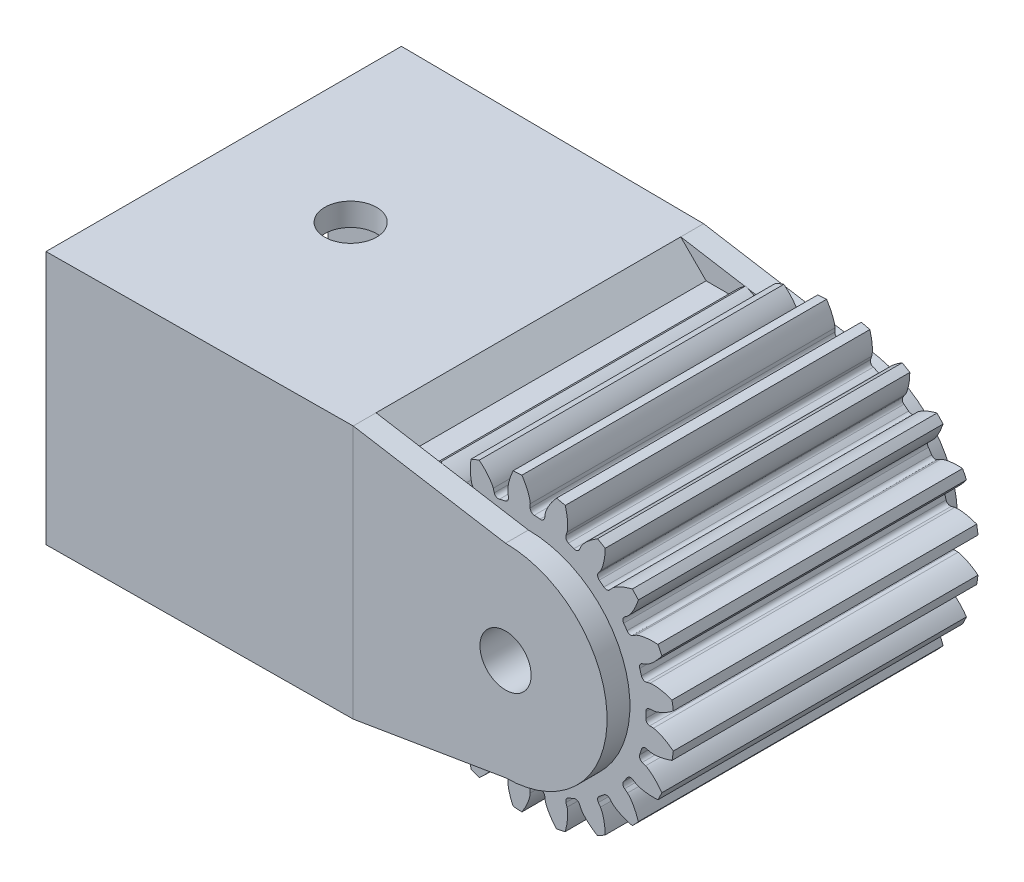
SolidWorks part; units mm, degrees
other "Markup1"
sketch "Sketch19" plane through (25.4, -25.4, 31.4326) normal (0.0354, -0.1004, 0.9943) x (0.9424, -0.3277, -0.0667)
sketch "Sketch21" plane through (24.1691, -24.3177, 31.4326) normal (0.0354, -0.1004, 0.9943) x (0.9424, -0.3277, -0.0667)
sketch "Sketch23" plane through (18.1268, -18.2383, 33.02) normal (0.0354, -0.1004, 0.9943) x (0.9424, -0.3277, -0.0667)
ref_plane "Front Plane" through (0, 0, 0) normal (0, 0, 1) x (1, 0, 0)
ref_plane "Top Plane" through (0, 0, 0) normal (0, 1, 0) x (1, 0, 0)
ref_plane "Right Plane" through (0, 0, 0) normal (1, 0, 0) x (0, 0, -1)
sketch "Sketch1" plane through (0, 0, 0) normal (0, 0, 1) x (1, 0, 0)
  line L0 (0, 0) -> (0, 11.1125) construction
  line L1 (-3.5715, 12.4124) -> (3.5715, 9.8126) construction
  circle A0 centre (0, 0) radius 9.7896 construction
  circle A1 centre (0, 0) radius 12.1708 construction
  circle A2 centre (0, 0) radius 11.1125 construction
  circle A3 centre (0, 0) radius 10.4423 construction
  circle A4 centre (0, 0) radius 2.3813 construction
  circle A5 centre (0, 0) radius 7.62 construction
  point P8 (304.8, 0)
  point P13 (266.7, 0)
sketch "Sketch2" plane through (0, 0, 0) normal (1, 0, 0) x (0, 0, -1)
  line L0 (-6.35, 0) -> (6.35, 0) construction
  line L1 (-6.35, 12.1708) -> (6.35, 12.1708) construction
  point P2 (0, 12.1708)
  point P4 (0, 0)
  point P6 (0, 12.1708)
  dimension "Overall Width" = 12.7
  dimension "Hub Width" = 6.35
  dimension "Face Width" = 6.35
sketch "Sketch3" plane through (0, 0, 0) normal (0, 0, 1) x (1, 0, 0)
  circle A0 centre (0, 0) radius 12.1708
  circle A1 centre (0, 0) radius 12.1708 construction
extrude "Boss-Extrude1" add sketch "Sketch3" against normal up to vertex and the other way up to vertex
sketch "Sketch5" plane through (0, 0, 0) normal (1, 0, 0) x (0, 0, -1)
  line L1 (-6.35, 12.1708) -> (0, 12.1708)
  line L2 (-6.35, 12.1708) -> (-6.35, 7.62)
  line L3 (-6.35, 7.62) -> (0, 7.62)
  line L4 (0, 12.1708) -> (0, 7.62)
  line L11 (6.35, 2.3813) -> (-6.35, 2.3812)
  line L12 (6.35, 2.3813) -> (6.35, 0)
  line L13 (6.35, 0) -> (-6.35, 0)
  line L14 (-6.35, 2.3812) -> (-6.35, 0)
  point P5 (0, 2.3813)
  point P12 (0, 7.62)
revolve "Cut-Revolve1" cut sketch "Sketch5" angle 360 about L0
sketch "Sketch4" plane through (0, 0, 0) normal (0, 0, 1) x (1, 0, 0)
  line L0 (0, 0) -> (9.772, 0.586) construction
  line L2 (0, 0) -> (9.772, -0.586) construction
  line L4 (9.772, 0.586) -> (10.4236, 0.6251)
  line L5 (10.4236, -0.6251) -> (9.772, -0.586)
  arc A0 (9.772, 0.586) -> (9.772, -0.586) centre (0, 0) cw
  arc A3 (12.0846, 1.4466) -> (12.0846, -1.4466) centre (0, 0) cw
  circle A4 centre (0, 0) radius 12.1708 construction
  spline S0 degree 4 poles (10.4236, 0.6251) (10.4264, 0.6253) (10.4341, 0.6259) (10.4487, 0.6276) (10.4724, 0.631) (10.5026, 0.6362) (10.5415, 0.6439) (10.5871, 0.6544) (10.6371, 0.6672) (10.6913, 0.6826) (10.7451, 0.6993) (10.7985, 0.7171) (10.8516, 0.736) (10.9156, 0.7602) (10.992, 0.7909) (11.0807, 0.8294) (11.1807, 0.8762) (11.2817, 0.927) (11.3805, 0.9797) (11.4795, 1.036) (11.5747, 1.0926) (11.6727, 1.1545) (11.7627, 1.2132) (11.8624, 1.2823) (11.9426, 1.3391) (12.0473, 1.4176) (12.1087, 1.465) (12.1802, 1.5217) (12.2117, 1.5475) (12.2311, 1.5634) knots 0 0 0 0 0 0.005377 0.015084 0.028532 0.04661 0.064855 0.092111 0.119476 0.146842 0.174209 0.201575 0.228941 0.256307 0.307035 0.361767 0.4165 0.471232 0.525964 0.580697 0.635429 0.690161 0.744894 0.799626 0.854358 0.909091 0.954545 1 1 1 1 1 construction
  spline S1 degree 4 poles (10.4236, 0.6251) (10.4264, 0.6253) (10.4341, 0.6259) (10.4487, 0.6276) (10.4724, 0.631) (10.5026, 0.6362) (10.5415, 0.6439) (10.5871, 0.6544) (10.6371, 0.6672) (10.6913, 0.6826) (10.7451, 0.6993) (10.7985, 0.7171) (10.8516, 0.736) (10.9156, 0.7602) (10.992, 0.7909) (11.0807, 0.8294) (11.1807, 0.8762) (11.2817, 0.927) (11.3805, 0.9797) (11.4795, 1.036) (11.5747, 1.0926) (11.6727, 1.1545) (11.7627, 1.2132) (11.8624, 1.2823) (11.9426, 1.3391) (12.0246, 1.4005) (12.0643, 1.4309) (12.0846, 1.4466) knots 0 0 0 0 0 0.005377 0.015084 0.028532 0.04661 0.064855 0.092111 0.119476 0.146842 0.174209 0.201575 0.228941 0.256307 0.307035 0.361767 0.4165 0.471232 0.525964 0.580697 0.635429 0.690161 0.744894 0.799626 0.854358 0.909091 0.909091 0.909091 0.909091 0.909091
  spline S2 degree 4 poles (10.4236, -0.6251) (10.4264, -0.6253) (10.4341, -0.6259) (10.4487, -0.6276) (10.4724, -0.631) (10.5026, -0.6362) (10.5415, -0.6439) (10.5871, -0.6544) (10.6371, -0.6672) (10.6913, -0.6826) (10.7451, -0.6993) (10.7985, -0.7171) (10.8516, -0.736) (10.9156, -0.7602) (10.992, -0.7909) (11.0807, -0.8294) (11.1807, -0.8762) (11.2817, -0.927) (11.3805, -0.9797) (11.4795, -1.036) (11.5747, -1.0926) (11.6727, -1.1545) (11.7627, -1.2132) (11.8624, -1.2823) (11.9426, -1.3391) (12.0473, -1.4176) (12.1087, -1.465) (12.1802, -1.5217) (12.2117, -1.5475) (12.2311, -1.5634) knots 0 0 0 0 0 0.005377 0.015084 0.028532 0.04661 0.064855 0.092111 0.119476 0.146842 0.174209 0.201575 0.228941 0.256307 0.307035 0.361767 0.4165 0.471232 0.525964 0.580697 0.635429 0.690161 0.744894 0.799626 0.854358 0.909091 0.954545 1 1 1 1 1 construction
  spline S3 degree 4 poles (10.4236, -0.6251) (10.4264, -0.6253) (10.4341, -0.6259) (10.4487, -0.6276) (10.4724, -0.631) (10.5026, -0.6362) (10.5415, -0.6439) (10.5871, -0.6544) (10.6371, -0.6672) (10.6913, -0.6826) (10.7451, -0.6993) (10.7985, -0.7171) (10.8516, -0.736) (10.9156, -0.7602) (10.992, -0.7909) (11.0807, -0.8294) (11.1807, -0.8762) (11.2817, -0.927) (11.3805, -0.9797) (11.4795, -1.036) (11.5747, -1.0926) (11.6727, -1.1545) (11.7627, -1.2132) (11.8624, -1.2823) (11.9426, -1.3391) (12.0246, -1.4005) (12.0643, -1.4309) (12.0846, -1.4466) knots 0 0 0 0 0 0.005377 0.015084 0.028532 0.04661 0.064855 0.092111 0.119476 0.146842 0.174209 0.201575 0.228941 0.256307 0.307035 0.361767 0.4165 0.471232 0.525964 0.580697 0.635429 0.690161 0.744894 0.799626 0.854358 0.909091 0.909091 0.909091 0.909091 0.909091
extrude "Cut-Extrude1" cut sketch "Sketch4" against normal through all both and the other way through all
fillet "Fillet1" radius 0.3551 2 edges at (9.772, -0.586, -3.175) (9.772, 0.586, -3.175)
pattern_circular "CirPattern1" count 21 over 360 about axis through (0, 0, 6.35) along (0, 0, -1) of "Cut-Extrude1", "Fillet1"
sketch "Sketch6" plane through (0, 0, 6.35) normal (0, 0, 1) x (1, 0, 0)
  circle A0 centre (0, 0) radius 7.6799
extrude "Cut-Extrude2" cut sketch "Sketch6" against normal up to surface (6.35 mm away)
scale "Scale1" scale about centroid uniform scaling yes scale factor 1.5
sketch "Sketch7" plane through (0, 0, 1.5875) normal (0, 0, 1) x (1, 0, 0)
  line L42 (4.8395, -14.8971) -> (4.6986, -14.4636)
  line L43 (6.3934, -13.7985) -> (6.5851, -14.212)
  line L44 (9.0155, -12.8088) -> (8.7531, -12.4361)
  line L45 (10.1765, -11.3009) -> (10.4816, -11.6397)
  line L46 (12.3904, -9.5824) -> (12.0298, -9.3036)
  line L47 (13.0554, -7.7993) -> (13.4468, -8.0331)
  line L48 (14.6644, -5.5046) -> (14.2377, -5.3444)
  line L49 (14.7743, -3.6046) -> (15.2171, -3.7127)
  line L50 (15.6354, -0.9376) -> (15.1804, -0.9103)
  line L51 (15.1804, 0.9103) -> (15.6354, 0.9376)
  line L52 (15.2171, 3.7127) -> (14.7743, 3.6046)
  line L53 (14.2377, 5.3444) -> (14.6644, 5.5046)
  line L54 (13.4468, 8.0331) -> (13.0554, 7.7993)
  line L55 (12.0298, 9.3036) -> (12.3904, 9.5824)
  line L56 (10.4816, 11.6397) -> (10.1765, 11.3009)
  line L57 (8.7531, 12.4361) -> (9.0155, 12.8088)
  line L58 (6.5851, 14.212) -> (6.3934, 13.7985)
  line L59 (4.6986, 14.4636) -> (4.8395, 14.8971)
  line L60 (2.1034, 15.5216) -> (2.0422, 15.0699)
  line L61 (0.2267, 15.206) -> (0.2334, 15.6618)
  line L62 (-2.5651, 15.452) -> (-2.4905, 15.0024)
  line L63 (-4.2655, 14.5972) -> (-4.3933, 15.0348)
  line L64 (-7.0057, 14.0095) -> (-6.8018, 13.6018)
  line L65 (-8.3786, 12.6914) -> (-8.6297, 13.0719)
  line L66 (-10.8238, 11.3221) -> (-10.5088, 10.9926)
  line L67 (-11.7472, 9.658) -> (-12.0993, 9.9475)
  line L68 (-13.6802, 7.6287) -> (-13.2821, 7.4067)
  line L69 (-14.072, 5.7664) -> (-14.4938, 5.9392)
  line L70 (-15.321, 3.2575) -> (-14.8752, 3.1627)
  line L71 (-15.1465, 1.3624) -> (-15.6005, 1.4032)
  line L72 (-15.6005, -1.4032) -> (-15.1465, -1.3624)
  line L73 (-14.8752, -3.1627) -> (-15.321, -3.2575)
  line L74 (-14.4938, -5.9392) -> (-14.072, -5.7664)
  line L75 (-13.2821, -7.4067) -> (-13.6802, -7.6287)
  line L76 (-12.0993, -9.9475) -> (-11.7472, -9.658)
  line L77 (-10.5088, -10.9926) -> (-10.8238, -11.3221)
  line L78 (-8.6297, -13.0719) -> (-8.3786, -12.6914)
  line L79 (-6.8018, -13.6018) -> (-7.0057, -14.0095)
  line L80 (-4.3933, -15.0348) -> (-4.2655, -14.5972)
  line L81 (-2.4905, -15.0024) -> (-2.5651, -15.452)
  line L82 (0.2334, -15.6618) -> (0.2267, -15.206)
  line L83 (2.0422, -15.0699) -> (2.1034, -15.5216)
  line L84 (4.8395, -14.8971) -> (4.6986, -14.4636)
  line L85 (6.3934, -13.7985) -> (6.5851, -14.212)
  line L86 (9.0155, -12.8088) -> (8.7531, -12.4361)
  line L87 (10.1765, -11.3009) -> (10.4816, -11.6397)
  line L88 (12.3904, -9.5824) -> (12.0298, -9.3036)
  line L89 (13.0554, -7.7993) -> (13.4468, -8.0331)
  line L90 (14.6644, -5.5046) -> (14.2377, -5.3444)
  line L91 (14.7743, -3.6046) -> (15.2171, -3.7127)
  line L92 (15.6354, -0.9376) -> (15.1804, -0.9103)
  line L93 (15.1804, 0.9103) -> (15.6354, 0.9376)
  line L94 (15.2171, 3.7127) -> (14.7743, 3.6046)
  line L95 (14.2377, 5.3444) -> (14.6644, 5.5046)
  line L96 (13.4468, 8.0331) -> (13.0554, 7.7993)
  line L97 (12.0298, 9.3036) -> (12.3904, 9.5824)
  line L98 (10.4816, 11.6397) -> (10.1765, 11.3009)
  line L99 (8.7531, 12.4361) -> (9.0155, 12.8088)
  line L100 (6.5851, 14.212) -> (6.3934, 13.7985)
  line L101 (4.6986, 14.4636) -> (4.8395, 14.8971)
  line L102 (2.1034, 15.5216) -> (2.0422, 15.0699)
  line L103 (0.2267, 15.206) -> (0.2334, 15.6618)
  line L104 (-2.5651, 15.452) -> (-2.4905, 15.0024)
  line L105 (-4.2655, 14.5972) -> (-4.3933, 15.0348)
  line L106 (-7.0057, 14.0095) -> (-6.8018, 13.6018)
  line L107 (-8.3786, 12.6914) -> (-8.6297, 13.0719)
  line L108 (-10.8238, 11.3221) -> (-10.5088, 10.9926)
  line L109 (-11.7472, 9.658) -> (-12.0993, 9.9475)
  line L110 (-13.6802, 7.6287) -> (-13.2821, 7.4067)
  line L111 (-14.072, 5.7664) -> (-14.4938, 5.9392)
  line L112 (-15.321, 3.2575) -> (-14.8752, 3.1627)
  line L113 (-15.1465, 1.3624) -> (-15.6005, 1.4032)
  line L114 (-15.6005, -1.4032) -> (-15.1465, -1.3624)
  line L115 (-14.8752, -3.1627) -> (-15.321, -3.2575)
  line L116 (-14.4938, -5.9392) -> (-14.072, -5.7664)
  line L117 (-13.2821, -7.4067) -> (-13.6802, -7.6287)
  line L118 (-12.0993, -9.9475) -> (-11.7472, -9.658)
  line L119 (-10.5088, -10.9926) -> (-10.8238, -11.3221)
  line L120 (-8.6297, -13.0719) -> (-8.3786, -12.6914)
  line L121 (-6.8018, -13.6018) -> (-7.0057, -14.0095)
  line L122 (-4.3933, -15.0348) -> (-4.2655, -14.5972)
  line L123 (-2.4905, -15.0024) -> (-2.5651, -15.452)
  line L124 (0.2334, -15.6618) -> (0.2267, -15.206)
  line L125 (2.0422, -15.0699) -> (2.1034, -15.5216)
  circle A0 centre (0, 0) radius 3.5719
  arc A84 (3.5184, -17.914) -> (4.6026, -17.6665) centre (0, 0) ccw
  arc A85 (5.023, -13.7986) -> (4.6986, -14.4636) centre (5.2052, -14.2991) ccw
  arc A86 (5.023, -13.7986) -> (5.7033, -13.5316) centre (0, 0) ccw
  arc A87 (6.3934, -13.7985) -> (5.7033, -13.5316) centre (5.9102, -14.0224) ccw
  arc A88 (8.6423, -16.0811) -> (9.6055, -15.525) centre (0, 0) ccw
  arc A89 (8.867, -11.705) -> (8.7531, -12.4361) centre (9.1886, -12.1295) ccw
  arc A90 (8.867, -11.705) -> (9.4384, -11.2493) centre (0, 0) ccw
  arc A91 (10.1765, -11.3009) -> (9.4384, -11.2493) centre (9.7808, -11.6573) ccw
  arc A92 (12.9983, -12.8193) -> (13.7548, -12.004) centre (0, 0) ccw
  arc A93 (11.9232, -8.5714) -> (12.0298, -9.3036) centre (12.3557, -8.8822) ccw
  arc A94 (11.9232, -8.5714) -> (12.3349, -7.9675) centre (0, 0) ccw
  arc A95 (13.0554, -7.7993) -> (12.3349, -7.9675) centre (12.7823, -8.2565) ccw
  arc A96 (16.1994, -8.4184) -> (16.682, -7.4164) centre (0, 0) ccw
  arc A97 (13.9199, -4.6761) -> (14.2377, -5.3444) centre (14.4248, -4.8457) ccw
  arc A98 (13.9199, -4.6761) -> (14.1354, -3.9778) centre (0, 0) ccw
  arc A99 (14.7743, -3.6046) -> (14.1354, -3.9778) centre (14.6481, -4.1221) ccw
  arc A100 (17.9611, -3.2696) -> (18.1268, -2.1698) centre (0, 0) ccw
  arc A101 (14.6798, -0.3654) -> (15.1804, -0.9103) centre (15.2123, -0.3787) ccw
  arc A102 (14.6798, -0.3654) -> (14.6798, 0.3654) centre (0, 0) ccw
  arc A103 (15.1804, 0.9103) -> (14.6798, 0.3654) centre (15.2123, 0.3787) ccw
  arc A104 (18.1268, 2.1698) -> (17.9611, 3.2696) centre (0, 0) ccw
  arc A105 (14.1354, 3.9778) -> (14.7743, 3.6046) centre (14.6481, 4.1221) ccw
  arc A106 (14.1354, 3.9778) -> (13.9199, 4.6761) centre (0, 0) ccw
  arc A107 (14.2377, 5.3444) -> (13.9199, 4.6761) centre (14.4248, 4.8457) ccw
  arc A108 (16.682, 7.4164) -> (16.1994, 8.4184) centre (0, 0) ccw
  arc A109 (12.3349, 7.9675) -> (13.0554, 7.7993) centre (12.7823, 8.2565) ccw
  arc A110 (12.3349, 7.9675) -> (11.9232, 8.5714) centre (0, 0) ccw
  arc A111 (12.0298, 9.3036) -> (11.9232, 8.5714) centre (12.3557, 8.8822) ccw
  arc A112 (13.7548, 12.004) -> (12.9983, 12.8193) centre (0, 0) ccw
  arc A113 (9.4384, 11.2493) -> (10.1765, 11.3009) centre (9.7808, 11.6573) ccw
  arc A114 (9.4384, 11.2493) -> (8.867, 11.705) centre (0, 0) ccw
  arc A115 (8.7531, 12.4361) -> (8.867, 11.705) centre (9.1886, 12.1295) ccw
  arc A116 (9.6055, 15.525) -> (8.6423, 16.0811) centre (0, 0) ccw
  arc A117 (5.7033, 13.5316) -> (6.3934, 13.7985) centre (5.9102, 14.0224) ccw
  arc A118 (5.7033, 13.5316) -> (5.023, 13.7986) centre (0, 0) ccw
  arc A119 (4.6986, 14.4636) -> (5.023, 13.7986) centre (5.2052, 14.2991) ccw
  arc A120 (4.6026, 17.6665) -> (3.5184, 17.914) centre (0, 0) ccw
  arc A121 (1.4614, 14.6115) -> (2.0422, 15.0699) centre (1.5144, 15.1414) ccw
  arc A122 (1.4614, 14.6115) -> (0.7326, 14.6661) centre (0, 0) ccw
  arc A123 (0.2267, 15.206) -> (0.7326, 14.6661) centre (0.7592, 15.198) ccw
  arc A124 (-0.8091, 18.2383) -> (-1.9182, 18.1552) centre (0, 0) ccw
  arc A125 (-2.9103, 14.3931) -> (-2.4905, 15.0024) centre (-3.0159, 14.9151) ccw
  arc A126 (-2.9103, 14.3931) -> (-3.6228, 14.2305) centre (0, 0) ccw
  arc A127 (-4.2655, 14.5972) -> (-3.6228, 14.2305) centre (-3.7542, 14.7466) ccw
  arc A128 (-6.149, 17.1895) -> (-7.1843, 16.7832) centre (0, 0) ccw
  arc A129 (-7.0235, 12.8958) -> (-6.8018, 13.6018) centre (-7.2782, 13.3636) ccw
  arc A130 (-7.0235, 12.8958) -> (-7.6564, 12.5304) centre (0, 0) ccw
  arc A131 (-8.3786, 12.6914) -> (-7.6564, 12.5304) centre (-7.9341, 12.9849) ccw
  arc A132 (-10.9425, 14.6134) -> (-11.8121, 13.92) centre (0, 0) ccw
  arc A133 (-10.5125, 10.2527) -> (-10.5088, 10.9926) centre (-10.8938, 10.6246) ccw
  arc A134 (-10.5125, 10.2527) -> (-11.0096, 9.717) centre (0, 0) ccw
  arc A135 (-11.7472, 9.658) -> (-11.0096, 9.717) centre (-11.4089, 10.0694) ccw
  arc A136 (-14.7638, 10.7388) -> (-15.3903, 9.8199) centre (0, 0) ccw
  arc A137 (-13.0675, 6.6986) -> (-13.2821, 7.4067) centre (-13.5415, 6.9415) ccw
  arc A138 (-13.0675, 6.6986) -> (-13.3846, 6.0401) centre (0, 0) ccw
  arc A139 (-14.072, 5.7664) -> (-13.3846, 6.0401) centre (-13.8701, 6.2592) ccw
  arc A140 (-17.2732, 5.91) -> (-17.601, 4.8473) centre (0, 0) ccw
  arc A141 (-14.4614, 2.5492) -> (-14.8752, 3.1627) centre (-14.9859, 2.6417) ccw
  arc A142 (-14.4614, 2.5492) -> (-14.5703, 1.8266) centre (0, 0) ccw
  arc A143 (-15.1465, 1.3624) -> (-14.5703, 1.8266) centre (-15.0988, 1.8928) ccw
  arc A144 (-18.2478, 0.5561) -> (-18.2478, -0.5561) centre (0, 0) ccw
  arc A145 (-14.5703, -1.8266) -> (-15.1465, -1.3624) centre (-15.0988, -1.8928) ccw
  arc A146 (-14.5703, -1.8266) -> (-14.4614, -2.5492) centre (0, 0) ccw
  arc A147 (-14.8752, -3.1627) -> (-14.4614, -2.5492) centre (-14.9859, -2.6417) ccw
  arc A148 (-17.601, -4.8473) -> (-17.2732, -5.91) centre (0, 0) ccw
  arc A149 (-13.3846, -6.0401) -> (-14.072, -5.7664) centre (-13.8701, -6.2592) ccw
  arc A150 (-13.3846, -6.0401) -> (-13.0675, -6.6986) centre (0, 0) ccw
  arc A151 (-13.2821, -7.4067) -> (-13.0675, -6.6986) centre (-13.5415, -6.9415) ccw
  arc A152 (-15.3903, -9.8199) -> (-14.7638, -10.7388) centre (0, 0) ccw
  arc A153 (-11.0096, -9.717) -> (-11.7472, -9.658) centre (-11.4089, -10.0694) ccw
  arc A154 (-11.0096, -9.717) -> (-10.5125, -10.2527) centre (0, 0) ccw
  arc A155 (-10.5088, -10.9926) -> (-10.5125, -10.2527) centre (-10.8938, -10.6246) ccw
  arc A156 (-11.8121, -13.92) -> (-10.9425, -14.6134) centre (0, 0) ccw
  arc A157 (-7.6564, -12.5304) -> (-8.3786, -12.6914) centre (-7.9341, -12.9849) ccw
  arc A158 (-7.6564, -12.5304) -> (-7.0235, -12.8958) centre (0, 0) ccw
  arc A159 (-6.8018, -13.6018) -> (-7.0235, -12.8958) centre (-7.2782, -13.3636) ccw
  arc A160 (-7.1843, -16.7832) -> (-6.149, -17.1895) centre (0, 0) ccw
  arc A161 (-3.6228, -14.2305) -> (-4.2655, -14.5972) centre (-3.7542, -14.7466) ccw
  arc A162 (-3.6228, -14.2305) -> (-2.9103, -14.3931) centre (0, 0) ccw
  arc A163 (-2.4905, -15.0024) -> (-2.9103, -14.3931) centre (-3.0159, -14.9151) ccw
  arc A164 (-1.9182, -18.1552) -> (-0.8091, -18.2383) centre (0, 0) ccw
  arc A165 (0.7326, -14.6661) -> (0.2267, -15.206) centre (0.7592, -15.198) ccw
  arc A166 (0.7326, -14.6661) -> (1.4614, -14.6115) centre (0, 0) ccw
  arc A167 (2.0422, -15.0699) -> (1.4614, -14.6115) centre (1.5144, -15.1414) ccw
  arc A168 (3.5184, -17.914) -> (4.6026, -17.6665) centre (0, 0) ccw
  arc A169 (5.023, -13.7986) -> (4.6986, -14.4636) centre (5.2052, -14.2991) ccw
  arc A170 (5.023, -13.7986) -> (5.7033, -13.5316) centre (0, 0) ccw
  arc A171 (6.3934, -13.7985) -> (5.7033, -13.5316) centre (5.9102, -14.0224) ccw
  arc A172 (8.6423, -16.0811) -> (9.6055, -15.525) centre (0, 0) ccw
  arc A173 (8.867, -11.705) -> (8.7531, -12.4361) centre (9.1886, -12.1295) ccw
  arc A174 (8.867, -11.705) -> (9.4384, -11.2493) centre (0, 0) ccw
  arc A175 (10.1765, -11.3009) -> (9.4384, -11.2493) centre (9.7808, -11.6573) ccw
  arc A176 (12.9983, -12.8193) -> (13.7548, -12.004) centre (0, 0) ccw
  arc A177 (11.9232, -8.5714) -> (12.0298, -9.3036) centre (12.3557, -8.8822) ccw
  arc A178 (11.9232, -8.5714) -> (12.3349, -7.9675) centre (0, 0) ccw
  arc A179 (13.0554, -7.7993) -> (12.3349, -7.9675) centre (12.7823, -8.2565) ccw
  arc A180 (16.1994, -8.4184) -> (16.682, -7.4164) centre (0, 0) ccw
  arc A181 (13.9199, -4.6761) -> (14.2377, -5.3444) centre (14.4248, -4.8457) ccw
  arc A182 (13.9199, -4.6761) -> (14.1354, -3.9778) centre (0, 0) ccw
  arc A183 (14.7743, -3.6046) -> (14.1354, -3.9778) centre (14.6481, -4.1221) ccw
  arc A184 (17.9611, -3.2696) -> (18.1268, -2.1698) centre (0, 0) ccw
  arc A185 (14.6798, -0.3654) -> (15.1804, -0.9103) centre (15.2123, -0.3787) ccw
  arc A186 (14.6798, -0.3654) -> (14.6798, 0.3654) centre (0, 0) ccw
  arc A187 (15.1804, 0.9103) -> (14.6798, 0.3654) centre (15.2123, 0.3787) ccw
  arc A188 (18.1268, 2.1698) -> (17.9611, 3.2696) centre (0, 0) ccw
  arc A189 (14.1354, 3.9778) -> (14.7743, 3.6046) centre (14.6481, 4.1221) ccw
  arc A190 (14.1354, 3.9778) -> (13.9199, 4.6761) centre (0, 0) ccw
  arc A191 (14.2377, 5.3444) -> (13.9199, 4.6761) centre (14.4248, 4.8457) ccw
  arc A192 (16.682, 7.4164) -> (16.1994, 8.4184) centre (0, 0) ccw
  arc A193 (12.3349, 7.9675) -> (13.0554, 7.7993) centre (12.7823, 8.2565) ccw
  arc A194 (12.3349, 7.9675) -> (11.9232, 8.5714) centre (0, 0) ccw
  arc A195 (12.0298, 9.3036) -> (11.9232, 8.5714) centre (12.3557, 8.8822) ccw
  arc A196 (13.7548, 12.004) -> (12.9983, 12.8193) centre (0, 0) ccw
  arc A197 (9.4384, 11.2493) -> (10.1765, 11.3009) centre (9.7808, 11.6573) ccw
  arc A198 (9.4384, 11.2493) -> (8.867, 11.705) centre (0, 0) ccw
  arc A199 (8.7531, 12.4361) -> (8.867, 11.705) centre (9.1886, 12.1295) ccw
  arc A200 (9.6055, 15.525) -> (8.6423, 16.0811) centre (0, 0) ccw
  arc A201 (5.7033, 13.5316) -> (6.3934, 13.7985) centre (5.9102, 14.0224) ccw
  arc A202 (5.7033, 13.5316) -> (5.023, 13.7986) centre (0, 0) ccw
  arc A203 (4.6986, 14.4636) -> (5.023, 13.7986) centre (5.2052, 14.2991) ccw
  arc A204 (4.6026, 17.6665) -> (3.5184, 17.914) centre (0, 0) ccw
  arc A205 (1.4614, 14.6115) -> (2.0422, 15.0699) centre (1.5144, 15.1414) ccw
  arc A206 (1.4614, 14.6115) -> (0.7326, 14.6661) centre (0, 0) ccw
  arc A207 (0.2267, 15.206) -> (0.7326, 14.6661) centre (0.7592, 15.198) ccw
  arc A208 (-0.8091, 18.2383) -> (-1.9182, 18.1552) centre (0, 0) ccw
  arc A209 (-2.9103, 14.3931) -> (-2.4905, 15.0024) centre (-3.0159, 14.9151) ccw
  arc A210 (-2.9103, 14.3931) -> (-3.6228, 14.2305) centre (0, 0) ccw
  arc A211 (-4.2655, 14.5972) -> (-3.6228, 14.2305) centre (-3.7542, 14.7466) ccw
  arc A212 (-6.149, 17.1895) -> (-7.1843, 16.7832) centre (0, 0) ccw
  arc A213 (-7.0235, 12.8958) -> (-6.8018, 13.6018) centre (-7.2782, 13.3636) ccw
  arc A214 (-7.0235, 12.8958) -> (-7.6564, 12.5304) centre (0, 0) ccw
  arc A215 (-8.3786, 12.6914) -> (-7.6564, 12.5304) centre (-7.9341, 12.9849) ccw
  arc A216 (-10.9425, 14.6134) -> (-11.8121, 13.92) centre (0, 0) ccw
  arc A217 (-10.5125, 10.2527) -> (-10.5088, 10.9926) centre (-10.8938, 10.6246) ccw
  arc A218 (-10.5125, 10.2527) -> (-11.0096, 9.717) centre (0, 0) ccw
  arc A219 (-11.7472, 9.658) -> (-11.0096, 9.717) centre (-11.4089, 10.0694) ccw
  arc A220 (-14.7638, 10.7388) -> (-15.3903, 9.8199) centre (0, 0) ccw
  arc A221 (-13.0675, 6.6986) -> (-13.2821, 7.4067) centre (-13.5415, 6.9415) ccw
  arc A222 (-13.0675, 6.6986) -> (-13.3846, 6.0401) centre (0, 0) ccw
  arc A223 (-14.072, 5.7664) -> (-13.3846, 6.0401) centre (-13.8701, 6.2592) ccw
  arc A224 (-17.2732, 5.91) -> (-17.601, 4.8473) centre (0, 0) ccw
  arc A225 (-14.4614, 2.5492) -> (-14.8752, 3.1627) centre (-14.9859, 2.6417) ccw
  arc A226 (-14.4614, 2.5492) -> (-14.5703, 1.8266) centre (0, 0) ccw
  arc A227 (-15.1465, 1.3624) -> (-14.5703, 1.8266) centre (-15.0988, 1.8928) ccw
  arc A228 (-18.2478, 0.5561) -> (-18.2478, -0.5561) centre (0, 0) ccw
  arc A229 (-14.5703, -1.8266) -> (-15.1465, -1.3624) centre (-15.0988, -1.8928) ccw
  arc A230 (-14.5703, -1.8266) -> (-14.4614, -2.5492) centre (0, 0) ccw
  arc A231 (-14.8752, -3.1627) -> (-14.4614, -2.5492) centre (-14.9859, -2.6417) ccw
  arc A232 (-17.601, -4.8473) -> (-17.2732, -5.91) centre (0, 0) ccw
  arc A233 (-13.3846, -6.0401) -> (-14.072, -5.7664) centre (-13.8701, -6.2592) ccw
  arc A234 (-13.3846, -6.0401) -> (-13.0675, -6.6986) centre (0, 0) ccw
  arc A235 (-13.2821, -7.4067) -> (-13.0675, -6.6986) centre (-13.5415, -6.9415) ccw
  arc A236 (-15.3903, -9.8199) -> (-14.7638, -10.7388) centre (0, 0) ccw
  arc A237 (-11.0096, -9.717) -> (-11.7472, -9.658) centre (-11.4089, -10.0694) ccw
  arc A238 (-11.0096, -9.717) -> (-10.5125, -10.2527) centre (0, 0) ccw
  arc A239 (-10.5088, -10.9926) -> (-10.5125, -10.2527) centre (-10.8938, -10.6246) ccw
  arc A240 (-11.8121, -13.92) -> (-10.9425, -14.6134) centre (0, 0) ccw
  arc A241 (-7.6564, -12.5304) -> (-8.3786, -12.6914) centre (-7.9341, -12.9849) ccw
  arc A242 (-7.6564, -12.5304) -> (-7.0235, -12.8958) centre (0, 0) ccw
  arc A243 (-6.8018, -13.6018) -> (-7.0235, -12.8958) centre (-7.2782, -13.3636) ccw
  arc A244 (-7.1843, -16.7832) -> (-6.149, -17.1895) centre (0, 0) ccw
  arc A245 (-3.6228, -14.2305) -> (-4.2655, -14.5972) centre (-3.7542, -14.7466) ccw
  arc A246 (-3.6228, -14.2305) -> (-2.9103, -14.3931) centre (0, 0) ccw
  arc A247 (-2.4905, -15.0024) -> (-2.9103, -14.3931) centre (-3.0159, -14.9151) ccw
  arc A248 (-1.9182, -18.1552) -> (-0.8091, -18.2383) centre (0, 0) ccw
  arc A249 (0.7326, -14.6661) -> (0.2267, -15.206) centre (0.7592, -15.198) ccw
  arc A250 (0.7326, -14.6661) -> (1.4614, -14.6115) centre (0, 0) ccw
  arc A251 (2.0422, -15.0699) -> (1.4614, -14.6115) centre (1.5144, -15.1414) ccw
  spline S42 degree 4 poles (3954.8169, 594.6922) (35.6431, -9.0378) (2.3287, -14.1736) (1.9722, -14.9303) (2.1178, -15.594) (2.1289, -15.6386) (2.1449, -15.6959) (2.1656, -15.763) (2.1903, -15.8363) (2.2195, -15.9155) (2.2505, -15.9941) (2.2832, -16.0721) (2.3173, -16.1493) (2.3606, -16.2424) (2.4152, -16.3532) (2.4828, -16.4816) (2.5639, -16.6259) (2.6513, -16.7714) (2.7412, -16.9132) (2.8365, -17.055) (2.9318, -17.191) (3.0353, -17.3307) (3.1332, -17.4587) (3.2478, -17.6001) (3.8754, -18.3592) (6.7351, -21.3302) (-47.4384, 39.1352) (2681.4833, -2988.8547) knots -0.833509 -0.833509 -0.833509 -0.833509 -0.833509 0.005377 0.015084 0.028532 0.04661 0.064855 0.092111 0.119476 0.146842 0.174209 0.201575 0.228941 0.256307 0.307035 0.361767 0.4165 0.471232 0.525964 0.580697 0.635429 0.690161 0.744894 0.799626 0.854358 2.152905 2.152905 2.152905 2.152905 2.152905 only from (2.1034, -15.5216) to (3.5184, -17.914)
  spline S43 degree 4 poles (-1119.0867, -3856.2115) (25.76, 55.8409) (3.1867, -22.14) (4.4742, -18.2225) (4.7103, -17.2664) (4.7521, -17.0892) (4.7848, -16.9314) (4.8175, -16.7607) (4.8443, -16.5967) (4.8687, -16.4277) (4.8881, -16.2608) (4.9038, -16.0918) (4.9142, -15.9267) (4.9194, -15.7817) (4.9204, -15.6581) (4.9191, -15.5555) (4.9164, -15.4711) (4.912, -15.3867) (4.9058, -15.3024) (4.8977, -15.2183) (4.8882, -15.1415) (4.8777, -15.0721) (4.8672, -15.0136) (4.8579, -14.9686) (4.7011, -14.3074) (4.0516, -13.7804) (-28.193, -23.6081) (-3821.3605, -1180.1823) knots -1.243805 -1.243805 -1.243805 -1.243805 -1.243805 0.054733 0.109465 0.164197 0.21893 0.273662 0.328394 0.383127 0.437859 0.492591 0.547324 0.602056 0.652784 0.68015 0.707516 0.734882 0.762248 0.789615 0.81698 0.844236 0.862481 0.880559 0.894007 0.903714 1.742609 1.742609 1.742609 1.742609 1.742609 only from (4.6026, -17.6665) to (4.8395, -14.8971)
  spline S44 degree 4 poles (3603.8269, 1733.9744) (36.7236, 1.8697) (6.403, -12.8575) (6.2854, -13.6857) (6.6201, -14.277) (6.6439, -14.3163) (6.676, -14.3663) (6.7156, -14.4244) (6.7608, -14.4871) (6.812, -14.5543) (6.8648, -14.6202) (6.9191, -14.6851) (6.9745, -14.7488) (7.0433, -14.825) (7.1281, -14.9148) (7.2305, -15.0176) (7.3505, -15.1316) (7.4769, -15.2448) (7.6047, -15.3539) (7.7375, -15.4612) (7.8687, -15.5631) (8.0088, -15.666) (8.14, -15.7595) (8.2912, -15.8609) (9.1147, -16.4012) (12.7231, -18.3973) (-56.8662, 23.4138) (3443.3329, -2065.6871) knots -0.833509 -0.833509 -0.833509 -0.833509 -0.833509 0.005377 0.015084 0.028532 0.04661 0.064855 0.092111 0.119476 0.146842 0.174209 0.201575 0.228941 0.256307 0.307035 0.361767 0.4165 0.471232 0.525964 0.580697 0.635429 0.690161 0.744894 0.799626 0.854358 2.152905 2.152905 2.152905 2.152905 2.152905 only from (6.5851, -14.212) to (8.6423, -16.0811)
  spline S45 degree 4 poles (67.2695, -4014.7474) (8.1562, 60.9529) (9.571, -20.2171) (9.6466, -16.0941) (9.5903, -15.1109) (9.5781, -14.9292) (9.5628, -14.7688) (9.5437, -14.5961) (9.5211, -14.4315) (9.4945, -14.2628) (9.4639, -14.0976) (9.4291, -13.9315) (9.3904, -13.7706) (9.3526, -13.6305) (9.3172, -13.5122) (9.2856, -13.4145) (9.2581, -13.3346) (9.2291, -13.2552) (9.1983, -13.1765) (9.1658, -13.0986) (9.1341, -13.028) (9.1036, -12.9648) (9.0763, -12.9119) (9.0542, -12.8717) (8.7094, -12.2861) (7.9334, -11.9739) (-19.9819, -30.8693) (-3303.7233, -2254.1159) knots -1.243805 -1.243805 -1.243805 -1.243805 -1.243805 0.054733 0.109465 0.164197 0.21893 0.273662 0.328394 0.383127 0.437859 0.492591 0.547324 0.602056 0.652784 0.68015 0.707516 0.734882 0.762248 0.789615 0.81698 0.844236 0.862481 0.880559 0.894007 0.903714 1.742609 1.742609 1.742609 1.742609 1.742609 only from (9.6055, -15.525) to (9.0155, -12.8088)
  spline S46 degree 4 poles (2932.6211, 2719.1854) (34.5409, 12.6111) (9.9084, -10.399) (10.04, -11.225) (10.5342, -11.6914) (10.5685, -11.7219) (10.614, -11.7603) (10.6689, -11.8041) (10.7306, -11.8507) (10.7993, -11.8998) (10.8692, -11.9473) (10.9402, -11.9932) (11.0119, -12.0378) (11.1001, -12.0903) (11.2076, -12.1511) (11.3358, -12.2192) (11.4841, -12.2927) (11.6382, -12.3637) (11.7924, -12.4302) (11.951, -12.4937) (12.1064, -12.5524) (12.2706, -12.6094) (12.4236, -12.66) (12.598, -12.7124) (13.5441, -12.986) (17.5805, -13.8298) (-61.2411, 5.612) (3899.2273, -958.9743) knots -0.833509 -0.833509 -0.833509 -0.833509 -0.833509 0.005377 0.015084 0.028532 0.04661 0.064855 0.092111 0.119476 0.146842 0.174209 0.201575 0.228941 0.256307 0.307035 0.361767 0.4165 0.471232 0.525964 0.580697 0.635429 0.690161 0.744894 0.799626 0.854358 2.152905 2.152905 2.152905 2.152905 2.152905 only from (10.4816, -11.6397) to (12.9983, -12.8193)
  spline S47 degree 4 poles (1247.6485, -3816.5554) (-10.1724, 60.649) (15.1049, -16.4978) (13.9618, -12.5357) (13.6183, -11.6127) (13.5531, -11.4428) (13.4911, -11.294) (13.422, -11.1345) (13.3518, -10.9839) (13.2767, -10.8305) (13.1988, -10.6818) (13.1165, -10.5333) (13.0321, -10.3909) (12.9547, -10.2682) (12.886, -10.1656) (12.8271, -10.0816) (12.7773, -10.0133) (12.7261, -9.946) (12.6735, -9.8799) (12.6195, -9.815) (12.5684, -9.7569) (12.5206, -9.7054) (12.4789, -9.663) (12.4459, -9.6311) (11.9439, -9.1731) (11.1103, -9.1035) (-9.9953, -35.3876) (-2492.5358, -3127.7614) knots -1.243805 -1.243805 -1.243805 -1.243805 -1.243805 0.054733 0.109465 0.164197 0.21893 0.273662 0.328394 0.383127 0.437859 0.492591 0.547324 0.602056 0.652784 0.68015 0.707516 0.734882 0.762248 0.789615 0.81698 0.844236 0.862481 0.880559 0.894007 0.903714 1.742609 1.742609 1.742609 1.742609 1.742609 only from (13.7548, -12.004) to (12.3904, -9.5824)
  spline S48 degree 4 poles (2000.839, 3462.7849) (29.2892, 22.2319) (12.5333, -7.0164) (12.9026, -7.7669) (13.5123, -8.067) (13.5541, -8.086) (13.6088, -8.1093) (13.6742, -8.135) (13.7469, -8.1613) (13.8271, -8.1879) (13.9079, -8.2127) (13.9892, -8.2357) (14.0709, -8.2572) (14.1707, -8.2813) (14.2913, -8.3078) (14.4338, -8.335) (14.5972, -8.3616) (14.7654, -8.384) (14.9324, -8.4021) (15.1026, -8.416) (15.2684, -8.4263) (15.4422, -8.4324) (15.6033, -8.4357) (15.7853, -8.4343) (16.77, -8.4169) (20.8759, -8.0334) (-60.1745, -12.6885) (4008.6582, 232.9477) knots -0.833509 -0.833509 -0.833509 -0.833509 -0.833509 0.005377 0.015084 0.028532 0.04661 0.064855 0.092111 0.119476 0.146842 0.174209 0.201575 0.228941 0.256307 0.307035 0.361767 0.4165 0.471232 0.525964 0.580697 0.635429 0.690161 0.744894 0.799626 0.854358 2.152905 2.152905 2.152905 2.152905 2.152905 only from (13.4468, -8.0331) to (16.1994, -8.4184)
  spline S49 degree 4 poles (2317.1684, -3279.2457) (-27.597, 54.9562) (19.2967, -11.3126) (17.0365, -7.8635) (16.4362, -7.0828) (16.3238, -6.9396) (16.2207, -6.8157) (16.1076, -6.6837) (15.9962, -6.5604) (15.8792, -6.436) (15.7609, -6.3168) (15.6386, -6.1992) (15.516, -6.088) (15.4058, -5.9936) (15.3099, -5.9157) (15.2288, -5.8528) (15.1611, -5.8023) (15.0924, -5.7531) (15.0226, -5.7054) (14.9518, -5.6593) (14.8859, -5.6188) (14.8251, -5.5837) (14.7727, -5.5555) (14.7318, -5.5347) (14.1171, -5.2451) (13.3, -5.4243) (0.8795, -36.7616) (-1459.8756, -3723.4916) knots -1.243805 -1.243805 -1.243805 -1.243805 -1.243805 0.054733 0.109465 0.164197 0.21893 0.273662 0.328394 0.383127 0.437859 0.492591 0.547324 0.602056 0.652784 0.68015 0.707516 0.734882 0.762248 0.789615 0.81698 0.844236 0.862481 0.880559 0.894007 0.903714 1.742609 1.742609 1.742609 1.742609 1.742609 only from (16.682, -7.4164) to (14.6644, -5.5046)
  spline S50 degree 4 poles (891.2735, 3898.7007) (21.435, 29.8774) (14.0446, -3.0104) (14.6187, -3.6188) (15.2898, -3.7257) (15.3353, -3.7316) (15.3945, -3.7378) (15.4645, -3.743) (15.5418, -3.7467) (15.6262, -3.7486) (15.7107, -3.7484) (15.7952, -3.7465) (15.8796, -3.7429) (15.9821, -3.7365) (16.1052, -3.7263) (16.2494, -3.7103) (16.4133, -3.6875) (16.5807, -3.6593) (16.7456, -3.6274) (16.9123, -3.5905) (17.0738, -3.5515) (17.2416, -3.5061) (17.3965, -3.4618) (17.5701, -3.4068) (18.5059, -3.0999) (22.3163, -1.5233) (-53.7611, -29.8615) (3761.9022, 1404.1712) knots -0.833509 -0.833509 -0.833509 -0.833509 -0.833509 0.005377 0.015084 0.028532 0.04661 0.064855 0.092111 0.119476 0.146842 0.174209 0.201575 0.228941 0.256307 0.307035 0.361767 0.4165 0.471232 0.525964 0.580697 0.635429 0.690161 0.744894 0.799626 0.854358 2.152905 2.152905 2.152905 2.152905 2.152905 only from (15.2171, -3.7127) to (17.9611, -3.2696)
  spline S51 degree 4 poles (3180.7977, -2450.5607) (-42.5696, 44.3803) (21.7738, -5.1222) (18.5974, -2.4925) (17.7936, -1.9235) (17.644, -1.8198) (17.509, -1.7317) (17.3621, -1.6389) (17.2193, -1.554) (17.0708, -1.4696) (16.9226, -1.3905) (16.771, -1.3142) (16.6211, -1.2441) (16.488, -1.1864) (16.3734, -1.1402) (16.2774, -1.104) (16.1978, -1.0757) (16.1176, -1.0489) (16.0369, -1.0239) (15.9557, -1.0008) (15.8807, -0.9815) (15.8123, -0.9659) (15.7539, -0.9543) (15.7087, -0.9465) (15.0359, -0.851) (14.308, -1.263) (11.6761, -34.8692) (-297.499, -3988.3732) knots -1.243805 -1.243805 -1.243805 -1.243805 -1.243805 0.054733 0.109465 0.164197 0.21893 0.273662 0.328394 0.383127 0.437859 0.492591 0.547324 0.602056 0.652784 0.68015 0.707516 0.734882 0.762248 0.789615 0.81698 0.844236 0.862481 0.880559 0.894007 0.903714 1.742609 1.742609 1.742609 1.742609 1.742609 only from (18.1268, -2.1698) to (15.6354, -0.9376)
  spline S52 degree 4 poles (-297.4854, 3988.1998) (11.6762, 34.8681) (14.308, 1.263) (15.0359, 0.851) (15.7087, 0.9465) (15.7539, 0.9543) (15.8123, 0.9659) (15.8807, 0.9815) (15.9557, 1.0008) (16.0369, 1.0239) (16.1176, 1.0489) (16.1978, 1.0757) (16.2774, 1.104) (16.3734, 1.1402) (16.488, 1.1864) (16.6211, 1.2441) (16.771, 1.3142) (16.9226, 1.3905) (17.0708, 1.4696) (17.2193, 1.554) (17.3621, 1.6389) (17.509, 1.7317) (17.644, 1.8198) (17.7936, 1.9235) (18.5974, 2.4925) (21.7739, 5.1223) (-42.5709, -44.3812) (3180.8847, 2450.628) knots -0.833509 -0.833509 -0.833509 -0.833509 -0.833509 0.005377 0.015084 0.028532 0.04661 0.064855 0.092111 0.119476 0.146842 0.174209 0.201575 0.228941 0.256307 0.307035 0.361767 0.4165 0.471232 0.525964 0.580697 0.635429 0.690161 0.744894 0.799626 0.854358 2.152905 2.152905 2.152905 2.152905 2.152905 only from (15.6354, 0.9376) to (18.1268, 2.1698)
  spline S53 degree 4 poles (3761.7992, -1404.1325) (-53.7597, 29.861) (22.3163, 1.5233) (18.5059, 3.0999) (17.5701, 3.4068) (17.3965, 3.4618) (17.2416, 3.5061) (17.0738, 3.5515) (16.9123, 3.5905) (16.7456, 3.6274) (16.5807, 3.6593) (16.4133, 3.6875) (16.2494, 3.7103) (16.1052, 3.7263) (15.9821, 3.7365) (15.8796, 3.7429) (15.7952, 3.7465) (15.7107, 3.7484) (15.6262, 3.7486) (15.5418, 3.7467) (15.4645, 3.743) (15.3945, 3.7378) (15.3353, 3.7316) (15.2898, 3.7257) (14.6187, 3.6188) (14.0446, 3.0104) (21.4352, -29.8784) (891.3117, -3898.8704) knots -1.243805 -1.243805 -1.243805 -1.243805 -1.243805 0.054733 0.109465 0.164197 0.21893 0.273662 0.328394 0.383127 0.437859 0.492591 0.547324 0.602056 0.652784 0.68015 0.707516 0.734882 0.762248 0.789615 0.81698 0.844236 0.862481 0.880559 0.894007 0.903714 1.742609 1.742609 1.742609 1.742609 1.742609 only from (17.9611, 3.2696) to (15.2171, 3.7127)
  spline S54 degree 4 poles (-1459.8115, 3723.3299) (0.8799, 36.7606) (13.3001, 5.4243) (14.1171, 5.2451) (14.7318, 5.5347) (14.7727, 5.5555) (14.8251, 5.5837) (14.8859, 5.6188) (14.9518, 5.6593) (15.0226, 5.7054) (15.0924, 5.7531) (15.1611, 5.8023) (15.2288, 5.8528) (15.3099, 5.9157) (15.4058, 5.9936) (15.516, 6.088) (15.6386, 6.1992) (15.7609, 6.3168) (15.8792, 6.436) (15.9962, 6.5604) (16.1076, 6.6837) (16.2207, 6.8157) (16.3238, 6.9396) (16.4362, 7.0828) (17.0365, 7.8635) (19.2967, 11.3127) (-27.598, -54.9575) (2317.2317, 3279.3357) knots -0.833509 -0.833509 -0.833509 -0.833509 -0.833509 0.005377 0.015084 0.028532 0.04661 0.064855 0.092111 0.119476 0.146842 0.174209 0.201575 0.228941 0.256307 0.307035 0.361767 0.4165 0.471232 0.525964 0.580697 0.635429 0.690161 0.744894 0.799626 0.854358 2.152905 2.152905 2.152905 2.152905 2.152905 only from (14.6644, 5.5046) to (16.682, 7.4164)
  spline S55 degree 4 poles (4008.5484, -232.9411) (-60.1729, 12.6884) (20.8758, 8.0334) (16.77, 8.4169) (15.7853, 8.4343) (15.6033, 8.4357) (15.4422, 8.4324) (15.2684, 8.4263) (15.1026, 8.416) (14.9324, 8.4021) (14.7654, 8.384) (14.5972, 8.3616) (14.4338, 8.335) (14.2913, 8.3078) (14.1707, 8.2813) (14.0709, 8.2572) (13.9892, 8.2357) (13.9079, 8.2127) (13.8271, 8.1879) (13.7469, 8.1613) (13.6742, 8.135) (13.6088, 8.1093) (13.5541, 8.086) (13.5123, 8.067) (12.9026, 7.7669) (12.5333, 7.0164) (29.2897, -22.2329) (2000.9254, -3462.9358) knots -1.243805 -1.243805 -1.243805 -1.243805 -1.243805 0.054733 0.109465 0.164197 0.21893 0.273662 0.328394 0.383127 0.437859 0.492591 0.547324 0.602056 0.652784 0.68015 0.707516 0.734882 0.762248 0.789615 0.81698 0.844236 0.862481 0.880559 0.894007 0.903714 1.742609 1.742609 1.742609 1.742609 1.742609 only from (16.1994, 8.4184) to (13.4468, 8.0331)
  spline S56 degree 4 poles (-2492.427, 3127.6258) (-9.9946, 35.3868) (11.1103, 9.1035) (11.9439, 9.1731) (12.4459, 9.6311) (12.4789, 9.663) (12.5206, 9.7054) (12.5684, 9.7569) (12.6195, 9.815) (12.6735, 9.8799) (12.7261, 9.946) (12.7773, 10.0133) (12.8271, 10.0816) (12.886, 10.1656) (12.9547, 10.2682) (13.0321, 10.3909) (13.1165, 10.5333) (13.1988, 10.6818) (13.2767, 10.8305) (13.3518, 10.9839) (13.422, 11.1345) (13.4911, 11.294) (13.5531, 11.4428) (13.6183, 11.6127) (13.9618, 12.5357) (15.1049, 16.4979) (-10.1729, -60.6505) (1247.6824, 3816.66) knots -0.833509 -0.833509 -0.833509 -0.833509 -0.833509 0.005377 0.015084 0.028532 0.04661 0.064855 0.092111 0.119476 0.146842 0.174209 0.201575 0.228941 0.256307 0.307035 0.361767 0.4165 0.471232 0.525964 0.580697 0.635429 0.690161 0.744894 0.799626 0.854358 2.152905 2.152905 2.152905 2.152905 2.152905 only from (12.3904, 9.5824) to (13.7548, 12.004)
  spline S57 degree 4 poles (3899.1204, 958.9482) (-61.2396, -5.6116) (17.5805, 13.8298) (13.5441, 12.986) (12.598, 12.7124) (12.4236, 12.66) (12.2706, 12.6094) (12.1064, 12.5524) (11.951, 12.4937) (11.7924, 12.4302) (11.6382, 12.3637) (11.4841, 12.2927) (11.3358, 12.2192) (11.2076, 12.1511) (11.1001, 12.0903) (11.0119, 12.0378) (10.9402, 11.9932) (10.8692, 11.9473) (10.7993, 11.8998) (10.7306, 11.8507) (10.6689, 11.8041) (10.614, 11.7603) (10.5685, 11.7219) (10.5342, 11.6914) (10.04, 11.225) (9.9084, 10.3989) (34.5417, -12.6118) (2932.7482, -2719.3041) knots -1.243805 -1.243805 -1.243805 -1.243805 -1.243805 0.054733 0.109465 0.164197 0.21893 0.273662 0.328394 0.383127 0.437859 0.492591 0.547324 0.602056 0.652784 0.68015 0.707516 0.734882 0.762248 0.789615 0.81698 0.844236 0.862481 0.880559 0.894007 0.903714 1.742609 1.742609 1.742609 1.742609 1.742609 only from (12.9983, 12.8193) to (10.4816, 11.6397)
  spline S58 degree 4 poles (-3303.5793, 2254.0184) (-19.981, 30.8687) (7.9334, 11.9739) (8.7094, 12.2861) (9.0542, 12.8717) (9.0763, 12.9119) (9.1036, 12.9648) (9.1341, 13.028) (9.1658, 13.0986) (9.1983, 13.1765) (9.2291, 13.2552) (9.2581, 13.3346) (9.2856, 13.4145) (9.3172, 13.5122) (9.3526, 13.6305) (9.3904, 13.7706) (9.4291, 13.9315) (9.4639, 14.0976) (9.4945, 14.2628) (9.5211, 14.4315) (9.5437, 14.5961) (9.5628, 14.7688) (9.5781, 14.9292) (9.5903, 15.1109) (9.6466, 16.0941) (9.571, 20.2172) (8.1561, -60.9545) (67.2711, 4014.8574) knots -0.833509 -0.833509 -0.833509 -0.833509 -0.833509 0.005377 0.015084 0.028532 0.04661 0.064855 0.092111 0.119476 0.146842 0.174209 0.201575 0.228941 0.256307 0.307035 0.361767 0.4165 0.471232 0.525964 0.580697 0.635429 0.690161 0.744894 0.799626 0.854358 2.152905 2.152905 2.152905 2.152905 2.152905 only from (9.0155, 12.8088) to (9.6055, 15.525)
  spline S59 degree 4 poles (3443.2385, 2065.6308) (-56.8648, -23.413) (12.723, 18.3973) (9.1146, 16.4012) (8.2912, 15.8609) (8.14, 15.7595) (8.0088, 15.666) (7.8687, 15.5631) (7.7375, 15.4612) (7.6047, 15.3539) (7.4769, 15.2448) (7.3505, 15.1316) (7.2305, 15.0176) (7.1281, 14.9148) (7.0433, 14.825) (6.9745, 14.7488) (6.9191, 14.6851) (6.8648, 14.6202) (6.812, 14.5543) (6.7608, 14.4871) (6.7156, 14.4244) (6.676, 14.3663) (6.6439, 14.3163) (6.6201, 14.277) (6.2854, 13.6856) (6.403, 12.8575) (36.7246, -1.8702) (3603.9833, -1734.0504) knots -1.243805 -1.243805 -1.243805 -1.243805 -1.243805 0.054733 0.109465 0.164197 0.21893 0.273662 0.328394 0.383127 0.437859 0.492591 0.547324 0.602056 0.652784 0.68015 0.707516 0.734882 0.762248 0.789615 0.81698 0.844236 0.862481 0.880559 0.894007 0.903714 1.742609 1.742609 1.742609 1.742609 1.742609 only from (8.6423, 16.0811) to (6.5851, 14.212)
  spline S60 degree 4 poles (-3821.1942, 1180.1316) (-28.192, 23.6078) (4.0516, 13.7804) (4.7011, 14.3074) (4.8579, 14.9686) (4.8672, 15.0136) (4.8777, 15.0721) (4.8882, 15.1415) (4.8977, 15.2183) (4.9058, 15.3024) (4.912, 15.3867) (4.9164, 15.4711) (4.9191, 15.5555) (4.9204, 15.6581) (4.9194, 15.7817) (4.9142, 15.9267) (4.9038, 16.0918) (4.8881, 16.2608) (4.8687, 16.4277) (4.8443, 16.5967) (4.8175, 16.7607) (4.7848, 16.9314) (4.7521, 17.0892) (4.7103, 17.2664) (4.4742, 18.2225) (3.1867, 22.1401) (25.7604, -55.8424) (-1119.1176, 3856.317) knots -0.833509 -0.833509 -0.833509 -0.833509 -0.833509 0.005377 0.015084 0.028532 0.04661 0.064855 0.092111 0.119476 0.146842 0.174209 0.201575 0.228941 0.256307 0.307035 0.361767 0.4165 0.471232 0.525964 0.580697 0.635429 0.690161 0.744894 0.799626 0.854358 2.152905 2.152905 2.152905 2.152905 2.152905 only from (4.8395, 14.8971) to (4.6026, 17.6665)
  spline S61 degree 4 poles (2681.4097, 2988.773) (-47.4374, -39.134) (6.7351, 21.3301) (3.8754, 18.3592) (3.2478, 17.6001) (3.1332, 17.4587) (3.0353, 17.3307) (2.9318, 17.191) (2.8365, 17.055) (2.7412, 16.9132) (2.6513, 16.7714) (2.5639, 16.6259) (2.4828, 16.4816) (2.4152, 16.3532) (2.3606, 16.2424) (2.3173, 16.1493) (2.2832, 16.0721) (2.2505, 15.9941) (2.2195, 15.9155) (2.1903, 15.8363) (2.1656, 15.763) (2.1449, 15.6959) (2.1289, 15.6386) (2.1178, 15.594) (1.9722, 14.9303) (2.3287, 14.1736) (35.6442, 9.0377) (3954.9888, -594.7186) knots -1.243805 -1.243805 -1.243805 -1.243805 -1.243805 0.054733 0.109465 0.164197 0.21893 0.273662 0.328394 0.383127 0.437859 0.492591 0.547324 0.602056 0.652784 0.68015 0.707516 0.734882 0.762248 0.789615 0.81698 0.844236 0.862481 0.880559 0.894007 0.903714 1.742609 1.742609 1.742609 1.742609 1.742609 only from (3.5184, 17.914) to (2.1034, 15.5216)
  spline S62 degree 4 poles (-3999.2791, 1.3849) (-33.898, 14.2492) (-0.1903, 14.3624) (0.2751, 15.0575) (0.23, 15.7355) (0.2257, 15.7812) (0.2184, 15.8402) (0.208, 15.9097) (0.1944, 15.9859) (0.1774, 16.0686) (0.1585, 16.1509) (0.1378, 16.2329) (0.1155, 16.3144) (0.0865, 16.4128) (0.0491, 16.5305) (0.0014, 16.6676) (-0.0573, 16.8223) (-0.122, 16.9792) (-0.1898, 17.1329) (-0.2629, 17.2873) (-0.3369, 17.436) (-0.4184, 17.5895) (-0.4961, 17.7307) (-0.5884, 17.8876) (-1.0958, 18.7317) (-3.4808, 22.0958) (41.0758, -45.7684) (-2206.0677, 3355.126) knots -0.833509 -0.833509 -0.833509 -0.833509 -0.833509 0.005377 0.015084 0.028532 0.04661 0.064855 0.092111 0.119476 0.146842 0.174209 0.201575 0.228941 0.256307 0.307035 0.361767 0.4165 0.471232 0.525964 0.580697 0.635429 0.690161 0.744894 0.799626 0.854358 2.152905 2.152905 2.152905 2.152905 2.152905 only from (0.2334, 15.6618) to (-0.8091, 18.2383)
  spline S63 degree 4 poles (1681.3259, 3646.3495) (-33.7949, -51.3778) (0.1487, 22.3677) (-1.7083, 18.6858) (-2.0842, 17.7755) (-2.152, 17.6066) (-2.2078, 17.4554) (-2.2656, 17.2915) (-2.3166, 17.1334) (-2.3659, 16.9698) (-2.41, 16.8078) (-2.4506, 16.643) (-2.4856, 16.4812) (-2.5123, 16.3386) (-2.5318, 16.2166) (-2.5457, 16.1149) (-2.5556, 16.031) (-2.5639, 15.9469) (-2.5703, 15.8627) (-2.5748, 15.7783) (-2.5769, 15.701) (-2.5769, 15.6307) (-2.5752, 15.5713) (-2.5727, 15.5254) (-2.5162, 14.8483) (-1.9525, 14.2303) (31.3967, 19.1425) (3954.5761, 597.4565) knots -1.243805 -1.243805 -1.243805 -1.243805 -1.243805 0.054733 0.109465 0.164197 0.21893 0.273662 0.328394 0.383127 0.437859 0.492591 0.547324 0.602056 0.652784 0.68015 0.707516 0.734882 0.762248 0.789615 0.81698 0.844236 0.862481 0.880559 0.894007 0.903714 1.742609 1.742609 1.742609 1.742609 1.742609 only from (-1.9182, 18.1552) to (-2.5651, 15.452)
  spline S64 degree 4 poles (-3822.0106, -1177.4848) (-36.5921, 3.6246) (-4.4152, 13.6682) (-4.1754, 14.4696) (-4.4183, 15.1042) (-4.436, 15.1466) (-4.4602, 15.2009) (-4.4907, 15.2642) (-4.5261, 15.3329) (-4.5668, 15.407) (-4.6091, 15.4801) (-4.6531, 15.5523) (-4.6984, 15.6236) (-4.7551, 15.7091) (-4.8255, 15.8106) (-4.9115, 15.9275) (-5.0132, 16.0581) (-5.1213, 16.1889) (-5.2313, 16.3158) (-5.3467, 16.4418) (-5.4612, 16.5621) (-5.5844, 16.6847) (-5.7003, 16.7967) (-5.8347, 16.9195) (-6.5684, 17.5765) (-9.839, 20.0881) (52.7414, -31.6278) (-3096.9991, 2555.8173) knots -0.833509 -0.833509 -0.833509 -0.833509 -0.833509 0.005377 0.015084 0.028532 0.04661 0.064855 0.092111 0.119476 0.146842 0.174209 0.201575 0.228941 0.256307 0.307035 0.361767 0.4165 0.471232 0.525964 0.580697 0.635429 0.690161 0.744894 0.799626 0.854358 2.152905 2.152905 2.152905 2.152905 2.152905 only from (-4.3933, 15.0348) to (-6.149, 17.1895)
  spline S65 degree 4 poles (531.8489, 3979.932) (-17.1496, -59.0565) (-6.4509, 21.4178) (-7.1401, 17.3521) (-7.2311, 16.3715) (-7.2461, 16.19) (-7.2548, 16.0291) (-7.2617, 15.8554) (-7.2638, 15.6893) (-7.2627, 15.5185) (-7.2571, 15.3507) (-7.2474, 15.1812) (-7.2331, 15.0164) (-7.2166, 14.8722) (-7.1992, 14.7499) (-7.1826, 14.6486) (-7.1673, 14.5655) (-7.1504, 14.4827) (-7.1317, 14.4003) (-7.1112, 14.3184) (-7.0903, 14.2439) (-7.0696, 14.1768) (-7.0505, 14.1205) (-7.0346, 14.0774) (-6.781, 13.447) (-6.0602, 13.0226) (24.3595, 27.5464) (3602.782, 1736.5449) knots -1.243805 -1.243805 -1.243805 -1.243805 -1.243805 0.054733 0.109465 0.164197 0.21893 0.273662 0.328394 0.383127 0.437859 0.492591 0.547324 0.602056 0.652784 0.68015 0.707516 0.734882 0.762248 0.789615 0.81698 0.844236 0.862481 0.880559 0.894007 0.903714 1.742609 1.742609 1.742609 1.742609 1.742609 only from (-7.1843, 16.7832) to (-7.0057, 14.0095)
  spline S66 degree 4 poles (-3305.1397, -2251.7299) (-36.0347, -7.3222) (-8.2478, 11.7596) (-8.2549, 12.596) (-8.674, 13.1308) (-8.7034, 13.1661) (-8.7426, 13.2109) (-8.7904, 13.2623) (-8.8445, 13.3176) (-8.9052, 13.3764) (-8.9672, 13.4338) (-9.0305, 13.4898) (-9.0948, 13.5446) (-9.1742, 13.6096) (-9.2714, 13.6858) (-9.388, 13.7722) (-9.5237, 13.867) (-9.6655, 13.9602) (-9.8081, 14.049) (-9.9554, 14.1353) (-10.1004, 14.2165) (-10.2542, 14.2974) (-10.398, 14.3703) (-10.5626, 14.448) (-11.4573, 14.8596) (-15.3229, 16.2956) (59.7207, -14.6768) (-3712.7484, 1529.413) knots -0.833509 -0.833509 -0.833509 -0.833509 -0.833509 0.005377 0.015084 0.028532 0.04661 0.064855 0.092111 0.119476 0.146842 0.174209 0.201575 0.228941 0.256307 0.307035 0.361767 0.4165 0.471232 0.525964 0.580697 0.635429 0.690161 0.744894 0.799626 0.854358 2.152905 2.152905 2.152905 2.152905 2.152905 only from (-8.6297, 13.0719) to (-10.9425, 14.6134)
  spline S67 degree 4 poles (-664.8852, 3959.88) (1.0195, -61.4877) (-12.4773, 18.5648) (-11.9375, 14.4766) (-11.7354, 13.5127) (-11.6962, 13.3349) (-11.6572, 13.1786) (-11.6126, 13.0106) (-11.5656, 12.8512) (-11.5142, 12.6884) (-11.4594, 12.5296) (-11.4001, 12.3706) (-11.3379, 12.2172) (-11.2796, 12.0843) (-11.227, 11.9726) (-11.1812, 11.8807) (-11.1422, 11.8058) (-11.1016, 11.7317) (-11.0595, 11.6584) (-11.0157, 11.5862) (-10.9738, 11.5211) (-10.9342, 11.4631) (-10.8994, 11.415) (-10.8715, 11.3785) (-10.4433, 10.8508) (-9.6294, 10.6578) (15.1579, 33.5027) (2930.8649, 2721.3337) knots -1.243805 -1.243805 -1.243805 -1.243805 -1.243805 0.054733 0.109465 0.164197 0.21893 0.273662 0.328394 0.383127 0.437859 0.492591 0.547324 0.602056 0.652784 0.68015 0.707516 0.734882 0.762248 0.789615 0.81698 0.844236 0.862481 0.880559 0.894007 0.903714 1.742609 1.742609 1.742609 1.742609 1.742609 only from (-11.8121, 13.92) to (-10.8238, 11.3221)
  spline S68 degree 4 poles (-2494.5925, -3125.8988) (-32.2756, -17.6183) (-11.3476, 8.8061) (-11.6009, 9.6032) (-12.1591, 9.9908) (-12.1975, 10.0158) (-12.2482, 10.047) (-12.309, 10.0821) (-12.377, 10.119) (-12.4523, 10.1573) (-12.5285, 10.1938) (-12.6055, 10.2287) (-12.6831, 10.2621) (-12.7781, 10.3009) (-12.8935, 10.345) (-13.0304, 10.3932) (-13.1879, 10.4438) (-13.351, 10.491) (-13.5133, 10.5338) (-13.6796, 10.5729) (-13.842, 10.6078) (-14.0129, 10.6397) (-14.1717, 10.667) (-14.3519, 10.6928) (-15.3283, 10.8223) (-19.4454, 11.0551) (61.3935, 3.5782) (-3998.6038, 367.1136) knots -0.833509 -0.833509 -0.833509 -0.833509 -0.833509 0.005377 0.015084 0.028532 0.04661 0.064855 0.092111 0.119476 0.146842 0.174209 0.201575 0.228941 0.256307 0.307035 0.361767 0.4165 0.471232 0.525964 0.580697 0.635429 0.690161 0.744894 0.799626 0.854358 2.152905 2.152905 2.152905 2.152905 2.152905 only from (-12.0993, 9.9475) to (-14.7638, 10.7388)
  spline S69 degree 4 poles (-1802.5413, 3587.9753) (19.098, -58.4555) (-17.3951, 14.0623) (-15.6742, 10.3148) (-15.197, 9.4533) (-15.1071, 9.295) (-15.0237, 9.1571) (-14.9316, 9.0097) (-14.8398, 8.8713) (-14.7426, 8.7308) (-14.6434, 8.5953) (-14.5399, 8.4608) (-14.4353, 8.3326) (-14.3404, 8.2227) (-14.2572, 8.1315) (-14.1864, 8.0572) (-14.127, 7.9971) (-14.0663, 7.9382) (-14.0045, 7.8806) (-13.9414, 7.8246) (-13.8822, 7.7747) (-13.8273, 7.7309) (-13.7797, 7.6952) (-13.7423, 7.6685) (-13.1777, 7.2905) (-12.343, 7.346) (4.6094, 36.4821) (1998.5276, 3464.3201) knots -1.243805 -1.243805 -1.243805 -1.243805 -1.243805 0.054733 0.109465 0.164197 0.21893 0.273662 0.328394 0.383127 0.437859 0.492591 0.547324 0.602056 0.652784 0.68015 0.707516 0.734882 0.762248 0.789615 0.81698 0.844236 0.862481 0.880559 0.894007 0.903714 1.742609 1.742609 1.742609 1.742609 1.742609 only from (-15.3903, 9.8199) to (-13.6802, 7.6287)
  spline S70 degree 4 poles (-1462.3899, -3722.318) (-25.6486, -26.3489) (-13.4391, 5.0701) (-13.9161, 5.7572) (-14.5637, 5.9629) (-14.6079, 5.9756) (-14.6654, 5.9904) (-14.7339, 6.0061) (-14.8098, 6.0213) (-14.893, 6.0357) (-14.9766, 6.0481) (-15.0604, 6.0588) (-15.1444, 6.0678) (-15.2466, 6.0768) (-15.3699, 6.085) (-15.5149, 6.0907) (-15.6804, 6.0926) (-15.8501, 6.0896) (-16.0179, 6.0827) (-16.1883, 6.0711) (-16.3538, 6.0565) (-16.5265, 6.0367) (-16.6863, 6.0159) (-16.8661, 5.9874) (-17.8372, 5.8234) (-21.84, 4.8323) (57.6113, 21.5153) (-3929.1657, -827.8054) knots -0.833509 -0.833509 -0.833509 -0.833509 -0.833509 0.005377 0.015084 0.028532 0.04661 0.064855 0.092111 0.119476 0.146842 0.174209 0.201575 0.228941 0.256307 0.307035 0.361767 0.4165 0.471232 0.525964 0.580697 0.635429 0.690161 0.744894 0.799626 0.854358 2.152905 2.152905 2.152905 2.152905 2.152905 only from (-14.4938, 5.9392) to (-17.2732, 5.91)
  spline S71 degree 4 poles (-2780.0337, 2897.2632) (35.4796, -50.2292) (-20.7672, 8.3102) (-18.0182, 5.2365) (-17.3082, 4.554) (-17.1757, 4.4291) (-17.0554, 4.322) (-16.9239, 4.2083) (-16.7953, 4.103) (-16.6611, 3.9974) (-16.5264, 3.8972) (-16.3878, 3.7991) (-16.25, 3.7075) (-16.127, 3.6305) (-16.0206, 3.5678) (-15.931, 3.5177) (-15.8565, 3.4778) (-15.7812, 3.4394) (-15.7052, 3.4026) (-15.6283, 3.3676) (-15.5571, 3.3375) (-15.4917, 3.3118) (-15.4357, 3.2917) (-15.3921, 3.2772) (-14.7411, 3.0824) (-13.9599, 3.3814) (-6.3487, 36.2199) (888.6124, 3899.4865) knots -1.243805 -1.243805 -1.243805 -1.243805 -1.243805 0.054733 0.109465 0.164197 0.21893 0.273662 0.328394 0.383127 0.437859 0.492591 0.547324 0.602056 0.652784 0.68015 0.707516 0.734882 0.762248 0.789615 0.81698 0.844236 0.862481 0.880559 0.894007 0.903714 1.742609 1.742609 1.742609 1.742609 1.742609 only from (-17.601, 4.8473) to (-15.321, 3.2575)
  spline S72 degree 4 poles (-300.2476, -3987.9929) (-16.7426, -32.7384) (-14.3364, 0.8836) (-14.9948, 1.3995) (-15.6743, 1.4053) (-15.7202, 1.4044) (-15.7796, 1.4016) (-15.8496, 1.3963) (-15.9266, 1.3885) (-16.0104, 1.3777) (-16.0939, 1.365) (-16.1772, 1.3505) (-16.2601, 1.3343) (-16.3605, 1.3128) (-16.4806, 1.2843) (-16.6209, 1.247) (-16.7796, 1.2) (-16.9409, 1.1472) (-17.0992, 1.0911) (-17.2586, 1.0298) (-17.4124, 0.9671) (-17.5716, 0.8972) (-17.7182, 0.8303) (-17.8816, 0.75) (-18.7612, 0.3071) (-22.2941, -1.8198) (48.7101, 37.5407) (-3510.604, -1949.1702) knots -0.833509 -0.833509 -0.833509 -0.833509 -0.833509 0.005377 0.015084 0.028532 0.04661 0.064855 0.092111 0.119476 0.146842 0.174209 0.201575 0.228941 0.256307 0.307035 0.361767 0.4165 0.471232 0.525964 0.580697 0.635429 0.690161 0.744894 0.799626 0.854358 2.152905 2.152905 2.152905 2.152905 2.152905 only from (-15.6005, 1.4032) to (-18.2478, 0.5561)
  spline S73 degree 4 poles (-3510.508, 1949.1166) (48.7087, -37.5399) (-22.294, 1.8198) (-18.7612, -0.3071) (-17.8816, -0.75) (-17.7182, -0.8303) (-17.5716, -0.8972) (-17.4124, -0.9671) (-17.2586, -1.0298) (-17.0992, -1.0911) (-16.9409, -1.1472) (-16.7796, -1.2) (-16.6209, -1.247) (-16.4806, -1.2843) (-16.3605, -1.3128) (-16.2601, -1.3343) (-16.1772, -1.3505) (-16.0939, -1.365) (-16.0104, -1.3777) (-15.9266, -1.3885) (-15.8496, -1.3963) (-15.7796, -1.4016) (-15.7202, -1.4044) (-15.6743, -1.4053) (-14.9948, -1.3995) (-14.3364, -0.8836) (-16.7427, 32.7395) (-300.26, 3988.1663) knots -1.243805 -1.243805 -1.243805 -1.243805 -1.243805 0.054733 0.109465 0.164197 0.21893 0.273662 0.328394 0.383127 0.437859 0.492591 0.547324 0.602056 0.652784 0.68015 0.707516 0.734882 0.762248 0.789615 0.81698 0.844236 0.862481 0.880559 0.894007 0.903714 1.742609 1.742609 1.742609 1.742609 1.742609 only from (-18.2478, -0.5561) to (-15.6005, -1.4032)
  spline S74 degree 4 poles (888.5731, -3899.317) (-6.349, -36.2189) (-13.96, -3.3814) (-14.7412, -3.0824) (-15.3921, -3.2772) (-15.4357, -3.2917) (-15.4917, -3.3118) (-15.5571, -3.3375) (-15.6283, -3.3676) (-15.7052, -3.4026) (-15.7812, -3.4394) (-15.8565, -3.4778) (-15.931, -3.5177) (-16.0206, -3.5678) (-16.127, -3.6305) (-16.25, -3.7075) (-16.3878, -3.7991) (-16.5264, -3.8972) (-16.6611, -3.9974) (-16.7953, -4.103) (-16.9239, -4.2083) (-17.0554, -4.322) (-17.1757, -4.4291) (-17.3082, -4.554) (-18.0182, -5.2365) (-20.7672, -8.3103) (35.4807, 50.2304) (-2780.1097, -2897.3428) knots -0.833509 -0.833509 -0.833509 -0.833509 -0.833509 0.005377 0.015084 0.028532 0.04661 0.064855 0.092111 0.119476 0.146842 0.174209 0.201575 0.228941 0.256307 0.307035 0.361767 0.4165 0.471232 0.525964 0.580697 0.635429 0.690161 0.744894 0.799626 0.854358 2.152905 2.152905 2.152905 2.152905 2.152905 only from (-15.321, -3.2575) to (-17.601, -4.8473)
  spline S75 degree 4 poles (-3929.0582, 827.7824) (57.6098, -21.515) (-21.84, -4.8323) (-17.8372, -5.8234) (-16.8661, -5.9874) (-16.6863, -6.0159) (-16.5265, -6.0367) (-16.3538, -6.0565) (-16.1883, -6.0711) (-16.0179, -6.0827) (-15.8501, -6.0896) (-15.6804, -6.0926) (-15.5149, -6.0907) (-15.3699, -6.085) (-15.2466, -6.0768) (-15.1444, -6.0678) (-15.0604, -6.0588) (-14.9766, -6.0481) (-14.893, -6.0357) (-14.8098, -6.0213) (-14.7339, -6.0061) (-14.6654, -5.9904) (-14.6079, -5.9756) (-14.5637, -5.9629) (-13.9161, -5.7572) (-13.4391, -5.07) (-25.649, 26.35) (-1462.4529, 3722.4801) knots -1.243805 -1.243805 -1.243805 -1.243805 -1.243805 0.054733 0.109465 0.164197 0.21893 0.273662 0.328394 0.383127 0.437859 0.492591 0.547324 0.602056 0.652784 0.68015 0.707516 0.734882 0.762248 0.789615 0.81698 0.844236 0.862481 0.880559 0.894007 0.903714 1.742609 1.742609 1.742609 1.742609 1.742609 only from (-17.2732, -5.91) to (-14.4938, -5.9392)
  spline S76 degree 4 poles (1998.4402, -3464.1698) (4.6088, -36.4812) (-12.3431, -7.346) (-13.1777, -7.2905) (-13.7423, -7.6685) (-13.7797, -7.6952) (-13.8273, -7.7309) (-13.8822, -7.7747) (-13.9414, -7.8246) (-14.0045, -7.8806) (-14.0663, -7.9382) (-14.127, -7.9971) (-14.1864, -8.0572) (-14.2572, -8.1315) (-14.3404, -8.2227) (-14.4353, -8.3326) (-14.5399, -8.4608) (-14.6434, -8.5953) (-14.7426, -8.7308) (-14.8398, -8.8713) (-14.9316, -9.0097) (-15.0237, -9.1571) (-15.1071, -9.295) (-15.197, -9.4533) (-15.6742, -10.3148) (-17.3951, -14.0623) (19.0987, 58.4569) (-1802.5905, -3588.0737) knots -0.833509 -0.833509 -0.833509 -0.833509 -0.833509 0.005377 0.015084 0.028532 0.04661 0.064855 0.092111 0.119476 0.146842 0.174209 0.201575 0.228941 0.256307 0.307035 0.361767 0.4165 0.471232 0.525964 0.580697 0.635429 0.690161 0.744894 0.799626 0.854358 2.152905 2.152905 2.152905 2.152905 2.152905 only from (-13.6802, -7.6287) to (-15.3903, -9.8199)
  spline S77 degree 4 poles (-3998.4943, -367.1038) (61.392, -3.5783) (-19.4453, -11.0551) (-15.3282, -10.8223) (-14.3519, -10.6928) (-14.1717, -10.667) (-14.0129, -10.6397) (-13.842, -10.6078) (-13.6796, -10.5729) (-13.5133, -10.5338) (-13.351, -10.491) (-13.1879, -10.4438) (-13.0304, -10.3932) (-12.8935, -10.345) (-12.7781, -10.3009) (-12.6831, -10.2621) (-12.6055, -10.2287) (-12.5285, -10.1938) (-12.4523, -10.1573) (-12.377, -10.119) (-12.309, -10.0821) (-12.2482, -10.047) (-12.1975, -10.0158) (-12.1591, -9.9908) (-11.6009, -9.6032) (-11.3476, -8.806) (-32.2762, 17.6191) (-2494.7005, 3126.0352) knots -1.243805 -1.243805 -1.243805 -1.243805 -1.243805 0.054733 0.109465 0.164197 0.21893 0.273662 0.328394 0.383127 0.437859 0.492591 0.547324 0.602056 0.652784 0.68015 0.707516 0.734882 0.762248 0.789615 0.81698 0.844236 0.862481 0.880559 0.894007 0.903714 1.742609 1.742609 1.742609 1.742609 1.742609 only from (-14.7638, -10.7388) to (-12.0993, -9.9475)
  spline S78 degree 4 poles (2930.7371, -2721.2159) (15.1571, -33.5019) (-9.6294, -10.6578) (-10.4433, -10.8508) (-10.8715, -11.3785) (-10.8994, -11.415) (-10.9342, -11.4631) (-10.9738, -11.5211) (-11.0157, -11.5862) (-11.0595, -11.6584) (-11.1016, -11.7317) (-11.1422, -11.8058) (-11.1812, -11.8807) (-11.227, -11.9726) (-11.2796, -12.0843) (-11.3379, -12.2172) (-11.4001, -12.3706) (-11.4594, -12.5296) (-11.5142, -12.6884) (-11.5656, -12.8512) (-11.6126, -13.0106) (-11.6572, -13.1786) (-11.6962, -13.3349) (-11.7354, -13.5127) (-11.9375, -14.4766) (-12.4773, -18.5649) (1.0198, 61.4893) (-664.9032, -3959.9885) knots -0.833509 -0.833509 -0.833509 -0.833509 -0.833509 0.005377 0.015084 0.028532 0.04661 0.064855 0.092111 0.119476 0.146842 0.174209 0.201575 0.228941 0.256307 0.307035 0.361767 0.4165 0.471232 0.525964 0.580697 0.635429 0.690161 0.744894 0.799626 0.854358 2.152905 2.152905 2.152905 2.152905 2.152905 only from (-10.8238, -11.3221) to (-11.8121, -13.92)
  spline S79 degree 4 poles (-3712.6466, -1529.3713) (59.7192, 14.6762) (-15.3229, -16.2956) (-11.4573, -14.8596) (-10.5626, -14.448) (-10.398, -14.3703) (-10.2542, -14.2974) (-10.1004, -14.2165) (-9.9554, -14.1353) (-9.8081, -14.049) (-9.6655, -13.9602) (-9.5237, -13.867) (-9.388, -13.7722) (-9.2714, -13.6858) (-9.1742, -13.6096) (-9.0948, -13.5446) (-9.0305, -13.4898) (-8.9672, -13.4338) (-8.9052, -13.3764) (-8.8445, -13.3176) (-8.7904, -13.2623) (-8.7426, -13.2109) (-8.7034, -13.1661) (-8.674, -13.1308) (-8.2549, -12.596) (-8.2478, -11.7596) (-36.0356, 7.3228) (-3305.283, 2251.8283) knots -1.243805 -1.243805 -1.243805 -1.243805 -1.243805 0.054733 0.109465 0.164197 0.21893 0.273662 0.328394 0.383127 0.437859 0.492591 0.547324 0.602056 0.652784 0.68015 0.707516 0.734882 0.762248 0.789615 0.81698 0.844236 0.862481 0.880559 0.894007 0.903714 1.742609 1.742609 1.742609 1.742609 1.742609 only from (-10.9425, -14.6134) to (-8.6297, -13.0719)
  spline S80 degree 4 poles (3602.6251, -1736.47) (24.3585, -27.5459) (-6.0602, -13.0226) (-6.781, -13.447) (-7.0346, -14.0774) (-7.0505, -14.1205) (-7.0696, -14.1768) (-7.0903, -14.2439) (-7.1112, -14.3184) (-7.1317, -14.4003) (-7.1504, -14.4827) (-7.1673, -14.5655) (-7.1826, -14.6486) (-7.1992, -14.7499) (-7.2166, -14.8722) (-7.2331, -15.0164) (-7.2474, -15.1812) (-7.2571, -15.3507) (-7.2627, -15.5185) (-7.2638, -15.6893) (-7.2617, -15.8554) (-7.2548, -16.0291) (-7.2461, -16.19) (-7.2311, -16.3715) (-7.1401, -17.3521) (-6.4509, -21.4178) (-17.1498, 59.058) (531.8637, -3980.041) knots -0.833509 -0.833509 -0.833509 -0.833509 -0.833509 0.005377 0.015084 0.028532 0.04661 0.064855 0.092111 0.119476 0.146842 0.174209 0.201575 0.228941 0.256307 0.307035 0.361767 0.4165 0.471232 0.525964 0.580697 0.635429 0.690161 0.744894 0.799626 0.854358 2.152905 2.152905 2.152905 2.152905 2.152905 only from (-7.0057, -14.0095) to (-7.1843, -16.7832)
  spline S81 degree 4 poles (-3096.9141, -2555.7475) (52.7402, 31.6268) (-9.8389, -20.0881) (-6.5684, -17.5765) (-5.8347, -16.9195) (-5.7003, -16.7967) (-5.5844, -16.6847) (-5.4612, -16.5621) (-5.3467, -16.4418) (-5.2313, -16.3158) (-5.1213, -16.1889) (-5.0132, -16.0581) (-4.9115, -15.9275) (-4.8255, -15.8106) (-4.7551, -15.7091) (-4.6984, -15.6236) (-4.6531, -15.5523) (-4.6091, -15.4801) (-4.5668, -15.407) (-4.5261, -15.3329) (-4.4907, -15.2642) (-4.4602, -15.2009) (-4.436, -15.1466) (-4.4183, -15.1042) (-4.1754, -14.4696) (-4.4152, -13.6682) (-36.5931, -3.6242) (-3822.1766, 1177.5366) knots -1.243805 -1.243805 -1.243805 -1.243805 -1.243805 0.054733 0.109465 0.164197 0.21893 0.273662 0.328394 0.383127 0.437859 0.492591 0.547324 0.602056 0.652784 0.68015 0.707516 0.734882 0.762248 0.789615 0.81698 0.844236 0.862481 0.880559 0.894007 0.903714 1.742609 1.742609 1.742609 1.742609 1.742609 only from (-6.149, -17.1895) to (-4.3933, -15.0348)
  spline S82 degree 4 poles (3954.4041, -597.4311) (31.3957, -19.1423) (-1.9525, -14.2303) (-2.5162, -14.8483) (-2.5727, -15.5254) (-2.5752, -15.5713) (-2.5769, -15.6307) (-2.5769, -15.701) (-2.5748, -15.7783) (-2.5703, -15.8627) (-2.5639, -15.9469) (-2.5556, -16.031) (-2.5457, -16.1149) (-2.5318, -16.2166) (-2.5123, -16.3386) (-2.4856, -16.4812) (-2.4506, -16.643) (-2.41, -16.8078) (-2.3659, -16.9698) (-2.3166, -17.1334) (-2.2656, -17.2915) (-2.2078, -17.4554) (-2.152, -17.6066) (-2.0842, -17.7755) (-1.7083, -18.6858) (0.1487, -22.3677) (-33.7956, 51.3793) (1681.3722, -3646.4493) knots -0.833509 -0.833509 -0.833509 -0.833509 -0.833509 0.005377 0.015084 0.028532 0.04661 0.064855 0.092111 0.119476 0.146842 0.174209 0.201575 0.228941 0.256307 0.307035 0.361767 0.4165 0.471232 0.525964 0.580697 0.635429 0.690161 0.744894 0.799626 0.854358 2.152905 2.152905 2.152905 2.152905 2.152905 only from (-2.5651, -15.452) to (-1.9182, -18.1552)
  spline S83 degree 4 poles (-2206.0071, -3355.0342) (41.0749, 45.7671) (-3.4808, -22.0957) (-1.0958, -18.7317) (-0.5884, -17.8876) (-0.4961, -17.7307) (-0.4184, -17.5895) (-0.3369, -17.436) (-0.2629, -17.2873) (-0.1898, -17.1329) (-0.122, -16.9792) (-0.0573, -16.8223) (0.0014, -16.6676) (0.0491, -16.5305) (0.0865, -16.4128) (0.1155, -16.3144) (0.1378, -16.2329) (0.1585, -16.1509) (0.1774, -16.0686) (0.1944, -15.9859) (0.208, -15.9097) (0.2184, -15.8402) (0.2257, -15.7812) (0.23, -15.7355) (0.2751, -15.0575) (-0.1903, -14.3624) (-33.8991, -14.2492) (-3999.453, -1.3844) knots -1.243805 -1.243805 -1.243805 -1.243805 -1.243805 0.054733 0.109465 0.164197 0.21893 0.273662 0.328394 0.383127 0.437859 0.492591 0.547324 0.602056 0.652784 0.68015 0.707516 0.734882 0.762248 0.789615 0.81698 0.844236 0.862481 0.880559 0.894007 0.903714 1.742609 1.742609 1.742609 1.742609 1.742609 only from (-0.8091, -18.2383) to (0.2334, -15.6618)
  spline S84 degree 4 poles (2.1034, -15.5216) (2.104, -15.5257) (2.1059, -15.5372) (2.1101, -15.5589) (2.1178, -15.594) (2.1289, -15.6386) (2.1449, -15.6959) (2.1656, -15.763) (2.1903, -15.8363) (2.2195, -15.9155) (2.2505, -15.9941) (2.2832, -16.0721) (2.3173, -16.1493) (2.3606, -16.2424) (2.4152, -16.3532) (2.4828, -16.4816) (2.5639, -16.6259) (2.6513, -16.7714) (2.7412, -16.9132) (2.8365, -17.055) (2.9318, -17.191) (3.0353, -17.3307) (3.1332, -17.4587) (3.2478, -17.6001) (3.3417, -17.7138) (3.4428, -17.8294) (3.4927, -17.8855) (3.5184, -17.914) knots 0 0 0 0 0 0.005377 0.015084 0.028532 0.04661 0.064855 0.092111 0.119476 0.146842 0.174209 0.201575 0.228941 0.256307 0.307035 0.361767 0.4165 0.471232 0.525964 0.580697 0.635429 0.690161 0.744894 0.799626 0.854358 0.909091 0.909091 0.909091 0.909091 0.909091
  spline S85 degree 4 poles (4.6026, -17.6665) (4.6134, -17.6297) (4.634, -17.5576) (4.6749, -17.4095) (4.7103, -17.2664) (4.7521, -17.0892) (4.7848, -16.9314) (4.8175, -16.7607) (4.8443, -16.5967) (4.8687, -16.4277) (4.8881, -16.2608) (4.9038, -16.0918) (4.9142, -15.9267) (4.9194, -15.7817) (4.9204, -15.6581) (4.9191, -15.5555) (4.9164, -15.4711) (4.912, -15.3867) (4.9058, -15.3024) (4.8977, -15.2183) (4.8882, -15.1415) (4.8777, -15.0721) (4.8672, -15.0136) (4.8579, -14.9686) (4.8496, -14.9336) (4.844, -14.9123) (4.8407, -14.9011) (4.8395, -14.8971) knots 0 0 0 0 0 0.054733 0.109465 0.164197 0.21893 0.273662 0.328394 0.383127 0.437859 0.492591 0.547324 0.602056 0.652784 0.68015 0.707516 0.734882 0.762248 0.789615 0.81698 0.844236 0.862481 0.880559 0.894007 0.903714 0.909091 0.909091 0.909091 0.909091 0.909091
  spline S86 degree 4 poles (6.5851, -14.212) (6.5868, -14.2158) (6.592, -14.2262) (6.6024, -14.2457) (6.6201, -14.277) (6.6439, -14.3163) (6.676, -14.3663) (6.7156, -14.4244) (6.7608, -14.4871) (6.812, -14.5543) (6.8648, -14.6202) (6.9191, -14.6851) (6.9745, -14.7488) (7.0433, -14.825) (7.1281, -14.9148) (7.2305, -15.0176) (7.3505, -15.1316) (7.4769, -15.2448) (7.6047, -15.3539) (7.7375, -15.4612) (7.8687, -15.5631) (8.0088, -15.666) (8.14, -15.7595) (8.2912, -15.8609) (8.4145, -15.9418) (8.5452, -16.0225) (8.6093, -16.0614) (8.6423, -16.0811) knots 0 0 0 0 0 0.005377 0.015084 0.028532 0.04661 0.064855 0.092111 0.119476 0.146842 0.174209 0.201575 0.228941 0.256307 0.307035 0.361767 0.4165 0.471232 0.525964 0.580697 0.635429 0.690161 0.744894 0.799626 0.854358 0.909091 0.909091 0.909091 0.909091 0.909091
  spline S87 degree 4 poles (9.6055, -15.525) (9.6049, -15.4866) (9.6033, -15.4116) (9.5988, -15.258) (9.5903, -15.1109) (9.5781, -14.9292) (9.5628, -14.7688) (9.5437, -14.5961) (9.5211, -14.4315) (9.4945, -14.2628) (9.4639, -14.0976) (9.4291, -13.9315) (9.3904, -13.7706) (9.3526, -13.6305) (9.3172, -13.5122) (9.2856, -13.4145) (9.2581, -13.3346) (9.2291, -13.2552) (9.1983, -13.1765) (9.1658, -13.0986) (9.1341, -13.028) (9.1036, -12.9648) (9.0763, -12.9119) (9.0542, -12.8717) (9.0359, -12.8407) (9.0243, -12.822) (9.0178, -12.8123) (9.0155, -12.8088) knots 0 0 0 0 0 0.054733 0.109465 0.164197 0.21893 0.273662 0.328394 0.383127 0.437859 0.492591 0.547324 0.602056 0.652784 0.68015 0.707516 0.734882 0.762248 0.789615 0.81698 0.844236 0.862481 0.880559 0.894007 0.903714 0.909091 0.909091 0.909091 0.909091 0.909091
  spline S88 degree 4 poles (10.4816, -11.6397) (10.4844, -11.6427) (10.4924, -11.6512) (10.508, -11.6667) (10.5342, -11.6914) (10.5685, -11.7219) (10.614, -11.7603) (10.6689, -11.8041) (10.7306, -11.8507) (10.7993, -11.8998) (10.8692, -11.9473) (10.9402, -11.9932) (11.0119, -12.0378) (11.1001, -12.0903) (11.2076, -12.1511) (11.3358, -12.2192) (11.4841, -12.2927) (11.6382, -12.3637) (11.7924, -12.4302) (11.951, -12.4937) (12.1064, -12.5524) (12.2706, -12.6094) (12.4236, -12.66) (12.598, -12.7124) (12.7396, -12.7533) (12.8883, -12.7919) (12.961, -12.8102) (12.9983, -12.8193) knots 0 0 0 0 0 0.005377 0.015084 0.028532 0.04661 0.064855 0.092111 0.119476 0.146842 0.174209 0.201575 0.228941 0.256307 0.307035 0.361767 0.4165 0.471232 0.525964 0.580697 0.635429 0.690161 0.744894 0.799626 0.854358 0.909091 0.909091 0.909091 0.909091 0.909091
  spline S89 degree 4 poles (13.7548, -12.004) (13.7429, -11.9675) (13.7193, -11.8963) (13.6697, -11.7509) (13.6183, -11.6127) (13.5531, -11.4428) (13.4911, -11.294) (13.422, -11.1345) (13.3518, -10.9839) (13.2767, -10.8305) (13.1988, -10.6818) (13.1165, -10.5333) (13.0321, -10.3909) (12.9547, -10.2682) (12.886, -10.1656) (12.8271, -10.0816) (12.7773, -10.0133) (12.7261, -9.946) (12.6735, -9.8799) (12.6195, -9.815) (12.5684, -9.7569) (12.5206, -9.7054) (12.4789, -9.663) (12.4459, -9.6311) (12.4193, -9.6068) (12.4027, -9.5924) (12.3937, -9.585) (12.3904, -9.5824) knots 0 0 0 0 0 0.054733 0.109465 0.164197 0.21893 0.273662 0.328394 0.383127 0.437859 0.492591 0.547324 0.602056 0.652784 0.68015 0.707516 0.734882 0.762248 0.789615 0.81698 0.844236 0.862481 0.880559 0.894007 0.903714 0.909091 0.909091 0.909091 0.909091 0.909091
  spline S90 degree 4 poles (13.4468, -8.0331) (13.4504, -8.0351) (13.4605, -8.0408) (13.48, -8.0511) (13.5123, -8.067) (13.5541, -8.086) (13.6088, -8.1093) (13.6742, -8.135) (13.7469, -8.1613) (13.8271, -8.1879) (13.9079, -8.2127) (13.9892, -8.2357) (14.0709, -8.2572) (14.1707, -8.2813) (14.2913, -8.3078) (14.4338, -8.335) (14.5972, -8.3616) (14.7654, -8.384) (14.9324, -8.4021) (15.1026, -8.416) (15.2684, -8.4263) (15.4422, -8.4324) (15.6033, -8.4357) (15.7853, -8.4343) (15.9327, -8.4317) (16.0862, -8.4247) (16.1611, -8.4207) (16.1994, -8.4184) knots 0 0 0 0 0 0.005377 0.015084 0.028532 0.04661 0.064855 0.092111 0.119476 0.146842 0.174209 0.201575 0.228941 0.256307 0.307035 0.361767 0.4165 0.471232 0.525964 0.580697 0.635429 0.690161 0.744894 0.799626 0.854358 0.909091 0.909091 0.909091 0.909091 0.909091
  spline S91 degree 4 poles (16.682, -7.4164) (16.6599, -7.385) (16.6163, -7.3239) (16.526, -7.1996) (16.4362, -7.0828) (16.3238, -6.9396) (16.2207, -6.8157) (16.1076, -6.6837) (15.9962, -6.5604) (15.8792, -6.436) (15.7609, -6.3168) (15.6386, -6.1992) (15.516, -6.088) (15.4058, -5.9936) (15.3099, -5.9157) (15.2288, -5.8528) (15.1611, -5.8023) (15.0924, -5.7531) (15.0226, -5.7054) (14.9518, -5.6593) (14.8859, -5.6188) (14.8251, -5.5837) (14.7727, -5.5555) (14.7318, -5.5347) (14.6992, -5.5193) (14.6791, -5.5105) (14.6683, -5.5061) (14.6644, -5.5046) knots 0 0 0 0 0 0.054733 0.109465 0.164197 0.21893 0.273662 0.328394 0.383127 0.437859 0.492591 0.547324 0.602056 0.652784 0.68015 0.707516 0.734882 0.762248 0.789615 0.81698 0.844236 0.862481 0.880559 0.894007 0.903714 0.909091 0.909091 0.909091 0.909091 0.909091
  spline S92 degree 4 poles (15.2171, -3.7127) (15.2212, -3.7136) (15.2326, -3.7161) (15.2542, -3.7201) (15.2898, -3.7257) (15.3353, -3.7316) (15.3945, -3.7378) (15.4645, -3.743) (15.5418, -3.7467) (15.6262, -3.7486) (15.7107, -3.7484) (15.7952, -3.7465) (15.8796, -3.7429) (15.9821, -3.7365) (16.1052, -3.7263) (16.2494, -3.7103) (16.4133, -3.6875) (16.5807, -3.6593) (16.7456, -3.6274) (16.9123, -3.5905) (17.0738, -3.5515) (17.2416, -3.5061) (17.3965, -3.4618) (17.5701, -3.4068) (17.7101, -3.3608) (17.8548, -3.309) (17.9251, -3.2831) (17.9611, -3.2696) knots 0 0 0 0 0 0.005377 0.015084 0.028532 0.04661 0.064855 0.092111 0.119476 0.146842 0.174209 0.201575 0.228941 0.256307 0.307035 0.361767 0.4165 0.471232 0.525964 0.580697 0.635429 0.690161 0.744894 0.799626 0.854358 0.909091 0.909091 0.909091 0.909091 0.909091
  spline S93 degree 4 poles (18.1268, -2.1698) (18.0965, -2.1463) (18.0369, -2.1008) (17.9139, -2.0086) (17.7936, -1.9235) (17.644, -1.8198) (17.509, -1.7317) (17.3621, -1.6389) (17.2193, -1.554) (17.0708, -1.4696) (16.9226, -1.3905) (16.771, -1.3142) (16.6211, -1.2441) (16.488, -1.1864) (16.3734, -1.1402) (16.2774, -1.104) (16.1978, -1.0757) (16.1176, -1.0489) (16.0369, -1.0239) (15.9557, -1.0008) (15.8807, -0.9815) (15.8123, -0.9659) (15.7539, -0.9543) (15.7087, -0.9465) (15.673, -0.9415) (15.6512, -0.9389) (15.6396, -0.9379) (15.6354, -0.9376) knots 0 0 0 0 0 0.054733 0.109465 0.164197 0.21893 0.273662 0.328394 0.383127 0.437859 0.492591 0.547324 0.602056 0.652784 0.68015 0.707516 0.734882 0.762248 0.789615 0.81698 0.844236 0.862481 0.880559 0.894007 0.903714 0.909091 0.909091 0.909091 0.909091 0.909091
  spline S94 degree 4 poles (15.6354, 0.9376) (15.6396, 0.9379) (15.6512, 0.9389) (15.673, 0.9415) (15.7087, 0.9465) (15.7539, 0.9543) (15.8123, 0.9659) (15.8807, 0.9815) (15.9557, 1.0008) (16.0369, 1.0239) (16.1176, 1.0489) (16.1978, 1.0757) (16.2774, 1.104) (16.3734, 1.1402) (16.488, 1.1864) (16.6211, 1.2441) (16.771, 1.3142) (16.9226, 1.3905) (17.0708, 1.4696) (17.2193, 1.554) (17.3621, 1.6389) (17.509, 1.7317) (17.644, 1.8198) (17.7936, 1.9235) (17.9139, 2.0086) (18.0369, 2.1008) (18.0965, 2.1463) (18.1268, 2.1698) knots 0 0 0 0 0 0.005377 0.015084 0.028532 0.04661 0.064855 0.092111 0.119476 0.146842 0.174209 0.201575 0.228941 0.256307 0.307035 0.361767 0.4165 0.471232 0.525964 0.580697 0.635429 0.690161 0.744894 0.799626 0.854358 0.909091 0.909091 0.909091 0.909091 0.909091
  spline S95 degree 4 poles (17.9611, 3.2696) (17.9251, 3.2831) (17.8548, 3.309) (17.7101, 3.3608) (17.5701, 3.4068) (17.3965, 3.4618) (17.2416, 3.5061) (17.0738, 3.5515) (16.9123, 3.5905) (16.7456, 3.6274) (16.5807, 3.6593) (16.4133, 3.6875) (16.2494, 3.7103) (16.1052, 3.7263) (15.9821, 3.7365) (15.8796, 3.7429) (15.7952, 3.7465) (15.7107, 3.7484) (15.6262, 3.7486) (15.5418, 3.7467) (15.4645, 3.743) (15.3945, 3.7378) (15.3353, 3.7316) (15.2898, 3.7257) (15.2542, 3.7201) (15.2326, 3.7161) (15.2212, 3.7136) (15.2171, 3.7127) knots 0 0 0 0 0 0.054733 0.109465 0.164197 0.21893 0.273662 0.328394 0.383127 0.437859 0.492591 0.547324 0.602056 0.652784 0.68015 0.707516 0.734882 0.762248 0.789615 0.81698 0.844236 0.862481 0.880559 0.894007 0.903714 0.909091 0.909091 0.909091 0.909091 0.909091
  spline S96 degree 4 poles (14.6644, 5.5046) (14.6683, 5.5061) (14.6791, 5.5105) (14.6992, 5.5193) (14.7318, 5.5347) (14.7727, 5.5555) (14.8251, 5.5837) (14.8859, 5.6188) (14.9518, 5.6593) (15.0226, 5.7054) (15.0924, 5.7531) (15.1611, 5.8023) (15.2288, 5.8528) (15.3099, 5.9157) (15.4058, 5.9936) (15.516, 6.088) (15.6386, 6.1992) (15.7609, 6.3168) (15.8792, 6.436) (15.9962, 6.5604) (16.1076, 6.6837) (16.2207, 6.8157) (16.3238, 6.9396) (16.4362, 7.0828) (16.526, 7.1996) (16.6163, 7.3239) (16.6599, 7.385) (16.682, 7.4164) knots 0 0 0 0 0 0.005377 0.015084 0.028532 0.04661 0.064855 0.092111 0.119476 0.146842 0.174209 0.201575 0.228941 0.256307 0.307035 0.361767 0.4165 0.471232 0.525964 0.580697 0.635429 0.690161 0.744894 0.799626 0.854358 0.909091 0.909091 0.909091 0.909091 0.909091
  spline S97 degree 4 poles (16.1994, 8.4184) (16.1611, 8.4207) (16.0862, 8.4247) (15.9327, 8.4317) (15.7853, 8.4343) (15.6033, 8.4357) (15.4422, 8.4324) (15.2684, 8.4263) (15.1026, 8.416) (14.9324, 8.4021) (14.7654, 8.384) (14.5972, 8.3616) (14.4338, 8.335) (14.2913, 8.3078) (14.1707, 8.2813) (14.0709, 8.2572) (13.9892, 8.2357) (13.9079, 8.2127) (13.8271, 8.1879) (13.7469, 8.1613) (13.6742, 8.135) (13.6088, 8.1093) (13.5541, 8.086) (13.5123, 8.067) (13.48, 8.0511) (13.4605, 8.0408) (13.4504, 8.0351) (13.4468, 8.0331) knots 0 0 0 0 0 0.054733 0.109465 0.164197 0.21893 0.273662 0.328394 0.383127 0.437859 0.492591 0.547324 0.602056 0.652784 0.68015 0.707516 0.734882 0.762248 0.789615 0.81698 0.844236 0.862481 0.880559 0.894007 0.903714 0.909091 0.909091 0.909091 0.909091 0.909091
  spline S98 degree 4 poles (12.3904, 9.5824) (12.3937, 9.585) (12.4027, 9.5924) (12.4193, 9.6068) (12.4459, 9.6311) (12.4789, 9.663) (12.5206, 9.7054) (12.5684, 9.7569) (12.6195, 9.815) (12.6735, 9.8799) (12.7261, 9.946) (12.7773, 10.0133) (12.8271, 10.0816) (12.886, 10.1656) (12.9547, 10.2682) (13.0321, 10.3909) (13.1165, 10.5333) (13.1988, 10.6818) (13.2767, 10.8305) (13.3518, 10.9839) (13.422, 11.1345) (13.4911, 11.294) (13.5531, 11.4428) (13.6183, 11.6127) (13.6697, 11.7509) (13.7193, 11.8963) (13.7429, 11.9675) (13.7548, 12.004) knots 0 0 0 0 0 0.005377 0.015084 0.028532 0.04661 0.064855 0.092111 0.119476 0.146842 0.174209 0.201575 0.228941 0.256307 0.307035 0.361767 0.4165 0.471232 0.525964 0.580697 0.635429 0.690161 0.744894 0.799626 0.854358 0.909091 0.909091 0.909091 0.909091 0.909091
  spline S99 degree 4 poles (12.9983, 12.8193) (12.961, 12.8102) (12.8883, 12.7919) (12.7396, 12.7533) (12.598, 12.7124) (12.4236, 12.66) (12.2706, 12.6094) (12.1064, 12.5524) (11.951, 12.4937) (11.7924, 12.4302) (11.6382, 12.3637) (11.4841, 12.2927) (11.3358, 12.2192) (11.2076, 12.1511) (11.1001, 12.0903) (11.0119, 12.0378) (10.9402, 11.9932) (10.8692, 11.9473) (10.7993, 11.8998) (10.7306, 11.8507) (10.6689, 11.8041) (10.614, 11.7603) (10.5685, 11.7219) (10.5342, 11.6914) (10.508, 11.6667) (10.4924, 11.6512) (10.4844, 11.6427) (10.4816, 11.6397) knots 0 0 0 0 0 0.054733 0.109465 0.164197 0.21893 0.273662 0.328394 0.383127 0.437859 0.492591 0.547324 0.602056 0.652784 0.68015 0.707516 0.734882 0.762248 0.789615 0.81698 0.844236 0.862481 0.880559 0.894007 0.903714 0.909091 0.909091 0.909091 0.909091 0.909091
  spline S100 degree 4 poles (9.0155, 12.8088) (9.0178, 12.8123) (9.0243, 12.822) (9.0359, 12.8407) (9.0542, 12.8717) (9.0763, 12.9119) (9.1036, 12.9648) (9.1341, 13.028) (9.1658, 13.0986) (9.1983, 13.1765) (9.2291, 13.2552) (9.2581, 13.3346) (9.2856, 13.4145) (9.3172, 13.5122) (9.3526, 13.6305) (9.3904, 13.7706) (9.4291, 13.9315) (9.4639, 14.0976) (9.4945, 14.2628) (9.5211, 14.4315) (9.5437, 14.5961) (9.5628, 14.7688) (9.5781, 14.9292) (9.5903, 15.1109) (9.5988, 15.258) (9.6033, 15.4116) (9.6049, 15.4866) (9.6055, 15.525) knots 0 0 0 0 0 0.005377 0.015084 0.028532 0.04661 0.064855 0.092111 0.119476 0.146842 0.174209 0.201575 0.228941 0.256307 0.307035 0.361767 0.4165 0.471232 0.525964 0.580697 0.635429 0.690161 0.744894 0.799626 0.854358 0.909091 0.909091 0.909091 0.909091 0.909091
  spline S101 degree 4 poles (8.6423, 16.0811) (8.6093, 16.0614) (8.5452, 16.0225) (8.4145, 15.9418) (8.2912, 15.8609) (8.14, 15.7595) (8.0088, 15.666) (7.8687, 15.5631) (7.7375, 15.4612) (7.6047, 15.3539) (7.4769, 15.2448) (7.3505, 15.1316) (7.2305, 15.0176) (7.1281, 14.9148) (7.0433, 14.825) (6.9745, 14.7488) (6.9191, 14.6851) (6.8648, 14.6202) (6.812, 14.5543) (6.7608, 14.4871) (6.7156, 14.4244) (6.676, 14.3663) (6.6439, 14.3163) (6.6201, 14.277) (6.6024, 14.2457) (6.592, 14.2262) (6.5868, 14.2158) (6.5851, 14.212) knots 0 0 0 0 0 0.054733 0.109465 0.164197 0.21893 0.273662 0.328394 0.383127 0.437859 0.492591 0.547324 0.602056 0.652784 0.68015 0.707516 0.734882 0.762248 0.789615 0.81698 0.844236 0.862481 0.880559 0.894007 0.903714 0.909091 0.909091 0.909091 0.909091 0.909091
  spline S102 degree 4 poles (4.8395, 14.8971) (4.8407, 14.9011) (4.844, 14.9123) (4.8496, 14.9336) (4.8579, 14.9686) (4.8672, 15.0136) (4.8777, 15.0721) (4.8882, 15.1415) (4.8977, 15.2183) (4.9058, 15.3024) (4.912, 15.3867) (4.9164, 15.4711) (4.9191, 15.5555) (4.9204, 15.6581) (4.9194, 15.7817) (4.9142, 15.9267) (4.9038, 16.0918) (4.8881, 16.2608) (4.8687, 16.4277) (4.8443, 16.5967) (4.8175, 16.7607) (4.7848, 16.9314) (4.7521, 17.0892) (4.7103, 17.2664) (4.6749, 17.4095) (4.634, 17.5576) (4.6134, 17.6297) (4.6026, 17.6665) knots 0 0 0 0 0 0.005377 0.015084 0.028532 0.04661 0.064855 0.092111 0.119476 0.146842 0.174209 0.201575 0.228941 0.256307 0.307035 0.361767 0.4165 0.471232 0.525964 0.580697 0.635429 0.690161 0.744894 0.799626 0.854358 0.909091 0.909091 0.909091 0.909091 0.909091
  spline S103 degree 4 poles (3.5184, 17.914) (3.4927, 17.8855) (3.4428, 17.8294) (3.3417, 17.7138) (3.2478, 17.6001) (3.1332, 17.4587) (3.0353, 17.3307) (2.9318, 17.191) (2.8365, 17.055) (2.7412, 16.9132) (2.6513, 16.7714) (2.5639, 16.6259) (2.4828, 16.4816) (2.4152, 16.3532) (2.3606, 16.2424) (2.3173, 16.1493) (2.2832, 16.0721) (2.2505, 15.9941) (2.2195, 15.9155) (2.1903, 15.8363) (2.1656, 15.763) (2.1449, 15.6959) (2.1289, 15.6386) (2.1178, 15.594) (2.1101, 15.5589) (2.1059, 15.5372) (2.104, 15.5257) (2.1034, 15.5216) knots 0 0 0 0 0 0.054733 0.109465 0.164197 0.21893 0.273662 0.328394 0.383127 0.437859 0.492591 0.547324 0.602056 0.652784 0.68015 0.707516 0.734882 0.762248 0.789615 0.81698 0.844236 0.862481 0.880559 0.894007 0.903714 0.909091 0.909091 0.909091 0.909091 0.909091
  spline S104 degree 4 poles (0.2334, 15.6618) (0.2335, 15.6659) (0.2333, 15.6776) (0.2324, 15.6996) (0.23, 15.7355) (0.2257, 15.7812) (0.2184, 15.8402) (0.208, 15.9097) (0.1944, 15.9859) (0.1774, 16.0686) (0.1585, 16.1509) (0.1378, 16.2329) (0.1155, 16.3144) (0.0865, 16.4128) (0.0491, 16.5305) (0.0014, 16.6676) (-0.0573, 16.8223) (-0.122, 16.9792) (-0.1898, 17.1329) (-0.2629, 17.2873) (-0.3369, 17.436) (-0.4184, 17.5895) (-0.4961, 17.7307) (-0.5884, 17.8876) (-0.6643, 18.014) (-0.7471, 18.1434) (-0.788, 18.2063) (-0.8091, 18.2383) knots 0 0 0 0 0 0.005377 0.015084 0.028532 0.04661 0.064855 0.092111 0.119476 0.146842 0.174209 0.201575 0.228941 0.256307 0.307035 0.361767 0.4165 0.471232 0.525964 0.580697 0.635429 0.690161 0.744894 0.799626 0.854358 0.909091 0.909091 0.909091 0.909091 0.909091
  spline S105 degree 4 poles (-1.9182, 18.1552) (-1.9343, 18.1204) (-1.9654, 18.0521) (-2.028, 17.9118) (-2.0842, 17.7755) (-2.152, 17.6066) (-2.2078, 17.4554) (-2.2656, 17.2915) (-2.3166, 17.1334) (-2.3659, 16.9698) (-2.41, 16.8078) (-2.4506, 16.643) (-2.4856, 16.4812) (-2.5123, 16.3386) (-2.5318, 16.2166) (-2.5457, 16.1149) (-2.5556, 16.031) (-2.5639, 15.9469) (-2.5703, 15.8627) (-2.5748, 15.7783) (-2.5769, 15.701) (-2.5769, 15.6307) (-2.5752, 15.5713) (-2.5727, 15.5254) (-2.5697, 15.4896) (-2.5673, 15.4677) (-2.5657, 15.4561) (-2.5651, 15.452) knots 0 0 0 0 0 0.054733 0.109465 0.164197 0.21893 0.273662 0.328394 0.383127 0.437859 0.492591 0.547324 0.602056 0.652784 0.68015 0.707516 0.734882 0.762248 0.789615 0.81698 0.844236 0.862481 0.880559 0.894007 0.903714 0.909091 0.909091 0.909091 0.909091 0.909091
  spline S106 degree 4 poles (-4.3933, 15.0348) (-4.3945, 15.0387) (-4.3981, 15.0498) (-4.4054, 15.0706) (-4.4183, 15.1042) (-4.436, 15.1466) (-4.4602, 15.2009) (-4.4907, 15.2642) (-4.5261, 15.3329) (-4.5668, 15.407) (-4.6091, 15.4801) (-4.6531, 15.5523) (-4.6984, 15.6236) (-4.7551, 15.7091) (-4.8255, 15.8106) (-4.9115, 15.9275) (-5.0132, 16.0581) (-5.1213, 16.1889) (-5.2313, 16.3158) (-5.3467, 16.4418) (-5.4612, 16.5621) (-5.5844, 16.6847) (-5.7003, 16.7967) (-5.8347, 16.9195) (-5.9445, 17.0178) (-6.0617, 17.1172) (-6.1193, 17.1652) (-6.149, 17.1895) knots 0 0 0 0 0 0.005377 0.015084 0.028532 0.04661 0.064855 0.092111 0.119476 0.146842 0.174209 0.201575 0.228941 0.256307 0.307035 0.361767 0.4165 0.471232 0.525964 0.580697 0.635429 0.690161 0.744894 0.799626 0.854358 0.909091 0.909091 0.909091 0.909091 0.909091
  spline S107 degree 4 poles (-7.1843, 16.7832) (-7.1895, 16.7452) (-7.1991, 16.6708) (-7.2174, 16.5182) (-7.2311, 16.3715) (-7.2461, 16.19) (-7.2548, 16.0291) (-7.2617, 15.8554) (-7.2638, 15.6893) (-7.2627, 15.5185) (-7.2571, 15.3507) (-7.2474, 15.1812) (-7.2331, 15.0164) (-7.2166, 14.8722) (-7.1992, 14.7499) (-7.1826, 14.6486) (-7.1673, 14.5655) (-7.1504, 14.4827) (-7.1317, 14.4003) (-7.1112, 14.3184) (-7.0903, 14.2439) (-7.0696, 14.1768) (-7.0505, 14.1205) (-7.0346, 14.0774) (-7.0212, 14.044) (-7.0124, 14.0238) (-7.0075, 14.0132) (-7.0057, 14.0095) knots 0 0 0 0 0 0.054733 0.109465 0.164197 0.21893 0.273662 0.328394 0.383127 0.437859 0.492591 0.547324 0.602056 0.652784 0.68015 0.707516 0.734882 0.762248 0.789615 0.81698 0.844236 0.862481 0.880559 0.894007 0.903714 0.909091 0.909091 0.909091 0.909091 0.909091
  spline S108 degree 4 poles (-8.6297, 13.0719) (-8.632, 13.0753) (-8.6387, 13.0848) (-8.6519, 13.1025) (-8.674, 13.1308) (-8.7034, 13.1661) (-8.7426, 13.2109) (-8.7904, 13.2623) (-8.8445, 13.3176) (-8.9052, 13.3764) (-8.9672, 13.4338) (-9.0305, 13.4898) (-9.0948, 13.5446) (-9.1742, 13.6096) (-9.2714, 13.6858) (-9.388, 13.7722) (-9.5237, 13.867) (-9.6655, 13.9602) (-9.8081, 14.049) (-9.9554, 14.1353) (-10.1004, 14.2165) (-10.2542, 14.2974) (-10.398, 14.3703) (-10.5626, 14.448) (-10.6965, 14.5096) (-10.8378, 14.57) (-10.907, 14.5988) (-10.9425, 14.6134) knots 0 0 0 0 0 0.005377 0.015084 0.028532 0.04661 0.064855 0.092111 0.119476 0.146842 0.174209 0.201575 0.228941 0.256307 0.307035 0.361767 0.4165 0.471232 0.525964 0.580697 0.635429 0.690161 0.744894 0.799626 0.854358 0.909091 0.909091 0.909091 0.909091 0.909091
  spline S109 degree 4 poles (-11.8121, 13.92) (-11.8058, 13.8821) (-11.793, 13.8082) (-11.7656, 13.657) (-11.7354, 13.5127) (-11.6962, 13.3349) (-11.6572, 13.1786) (-11.6126, 13.0106) (-11.5656, 12.8512) (-11.5142, 12.6884) (-11.4594, 12.5296) (-11.4001, 12.3706) (-11.3379, 12.2172) (-11.2796, 12.0843) (-11.227, 11.9726) (-11.1812, 11.8807) (-11.1422, 11.8058) (-11.1016, 11.7317) (-11.0595, 11.6584) (-11.0157, 11.5862) (-10.9738, 11.5211) (-10.9342, 11.4631) (-10.8994, 11.415) (-10.8715, 11.3785) (-10.8488, 11.3505) (-10.8345, 11.3338) (-10.8267, 11.3251) (-10.8238, 11.3221) knots 0 0 0 0 0 0.054733 0.109465 0.164197 0.21893 0.273662 0.328394 0.383127 0.437859 0.492591 0.547324 0.602056 0.652784 0.68015 0.707516 0.734882 0.762248 0.789615 0.81698 0.844236 0.862481 0.880559 0.894007 0.903714 0.909091 0.909091 0.909091 0.909091 0.909091
  spline S110 degree 4 poles (-12.0993, 9.9475) (-12.1025, 9.9501) (-12.1117, 9.9572) (-12.1295, 9.9702) (-12.1591, 9.9908) (-12.1975, 10.0158) (-12.2482, 10.047) (-12.309, 10.0821) (-12.377, 10.119) (-12.4523, 10.1573) (-12.5285, 10.1938) (-12.6055, 10.2287) (-12.6831, 10.2621) (-12.7781, 10.3009) (-12.8935, 10.345) (-13.0304, 10.3932) (-13.1879, 10.4438) (-13.351, 10.491) (-13.5133, 10.5338) (-13.6796, 10.5729) (-13.842, 10.6078) (-14.0129, 10.6397) (-14.1717, 10.667) (-14.3519, 10.6928) (-14.4981, 10.7122) (-14.6509, 10.7282) (-14.7255, 10.7354) (-14.7638, 10.7388) knots 0 0 0 0 0 0.005377 0.015084 0.028532 0.04661 0.064855 0.092111 0.119476 0.146842 0.174209 0.201575 0.228941 0.256307 0.307035 0.361767 0.4165 0.471232 0.525964 0.580697 0.635429 0.690161 0.744894 0.799626 0.854358 0.909091 0.909091 0.909091 0.909091 0.909091
  spline S111 degree 4 poles (-15.3903, 9.8199) (-15.3731, 9.7855) (-15.3391, 9.7187) (-15.2684, 9.5823) (-15.197, 9.4533) (-15.1071, 9.295) (-15.0237, 9.1571) (-14.9316, 9.0097) (-14.8398, 8.8713) (-14.7426, 8.7308) (-14.6434, 8.5953) (-14.5399, 8.4608) (-14.4353, 8.3326) (-14.3404, 8.2227) (-14.2572, 8.1315) (-14.1864, 8.0572) (-14.127, 7.9971) (-14.0663, 7.9382) (-14.0045, 7.8806) (-13.9414, 7.8246) (-13.8822, 7.7747) (-13.8273, 7.7309) (-13.7797, 7.6952) (-13.7423, 7.6685) (-13.7124, 7.6485) (-13.6938, 7.6367) (-13.6838, 7.6308) (-13.6802, 7.6287) knots 0 0 0 0 0 0.054733 0.109465 0.164197 0.21893 0.273662 0.328394 0.383127 0.437859 0.492591 0.547324 0.602056 0.652784 0.68015 0.707516 0.734882 0.762248 0.789615 0.81698 0.844236 0.862481 0.880559 0.894007 0.903714 0.909091 0.909091 0.909091 0.909091 0.909091
  spline S112 degree 4 poles (-14.4938, 5.9392) (-14.4977, 5.9407) (-14.5086, 5.9448) (-14.5294, 5.952) (-14.5637, 5.9629) (-14.6079, 5.9756) (-14.6654, 5.9904) (-14.7339, 6.0061) (-14.8098, 6.0213) (-14.893, 6.0357) (-14.9766, 6.0481) (-15.0604, 6.0588) (-15.1444, 6.0678) (-15.2466, 6.0768) (-15.3699, 6.085) (-15.5149, 6.0907) (-15.6804, 6.0926) (-15.8501, 6.0896) (-16.0179, 6.0827) (-16.1883, 6.0711) (-16.3538, 6.0565) (-16.5265, 6.0367) (-16.6863, 6.0159) (-16.8661, 5.9874) (-17.0114, 5.9629) (-17.1622, 5.9331) (-17.2356, 5.918) (-17.2732, 5.91) knots 0 0 0 0 0 0.005377 0.015084 0.028532 0.04661 0.064855 0.092111 0.119476 0.146842 0.174209 0.201575 0.228941 0.256307 0.307035 0.361767 0.4165 0.471232 0.525964 0.580697 0.635429 0.690161 0.744894 0.799626 0.854358 0.909091 0.909091 0.909091 0.909091 0.909091
  spline S113 degree 4 poles (-17.601, 4.8473) (-17.5745, 4.8195) (-17.5223, 4.7656) (-17.4145, 4.6561) (-17.3082, 4.554) (-17.1757, 4.4291) (-17.0554, 4.322) (-16.9239, 4.2083) (-16.7953, 4.103) (-16.6611, 3.9974) (-16.5264, 3.8972) (-16.3878, 3.7991) (-16.25, 3.7075) (-16.127, 3.6305) (-16.0206, 3.5678) (-15.931, 3.5177) (-15.8565, 3.4778) (-15.7812, 3.4394) (-15.7052, 3.4026) (-15.6283, 3.3676) (-15.5571, 3.3375) (-15.4917, 3.3118) (-15.4357, 3.2917) (-15.3921, 3.2772) (-15.3577, 3.2669) (-15.3364, 3.2611) (-15.3251, 3.2584) (-15.321, 3.2575) knots 0 0 0 0 0 0.054733 0.109465 0.164197 0.21893 0.273662 0.328394 0.383127 0.437859 0.492591 0.547324 0.602056 0.652784 0.68015 0.707516 0.734882 0.762248 0.789615 0.81698 0.844236 0.862481 0.880559 0.894007 0.903714 0.909091 0.909091 0.909091 0.909091 0.909091
  spline S114 degree 4 poles (-15.6005, 1.4032) (-15.6047, 1.4035) (-15.6163, 1.4043) (-15.6383, 1.405) (-15.6743, 1.4053) (-15.7202, 1.4044) (-15.7796, 1.4016) (-15.8496, 1.3963) (-15.9266, 1.3885) (-16.0104, 1.3777) (-16.0939, 1.365) (-16.1772, 1.3505) (-16.2601, 1.3343) (-16.3605, 1.3128) (-16.4806, 1.2843) (-16.6209, 1.247) (-16.7796, 1.2) (-16.9409, 1.1472) (-17.0992, 1.0911) (-17.2586, 1.0298) (-17.4124, 0.9671) (-17.5716, 0.8972) (-17.7182, 0.8303) (-17.8816, 0.75) (-18.0132, 0.6837) (-18.1485, 0.6109) (-18.2142, 0.5748) (-18.2478, 0.5561) knots 0 0 0 0 0 0.005377 0.015084 0.028532 0.04661 0.064855 0.092111 0.119476 0.146842 0.174209 0.201575 0.228941 0.256307 0.307035 0.361767 0.4165 0.471232 0.525964 0.580697 0.635429 0.690161 0.744894 0.799626 0.854358 0.909091 0.909091 0.909091 0.909091 0.909091
  spline S115 degree 4 poles (-18.2478, -0.5561) (-18.2142, -0.5748) (-18.1485, -0.6109) (-18.0132, -0.6837) (-17.8816, -0.75) (-17.7182, -0.8303) (-17.5716, -0.8972) (-17.4124, -0.9671) (-17.2586, -1.0298) (-17.0992, -1.0911) (-16.9409, -1.1472) (-16.7796, -1.2) (-16.6209, -1.247) (-16.4806, -1.2843) (-16.3605, -1.3128) (-16.2601, -1.3343) (-16.1772, -1.3505) (-16.0939, -1.365) (-16.0104, -1.3777) (-15.9266, -1.3885) (-15.8496, -1.3963) (-15.7796, -1.4016) (-15.7202, -1.4044) (-15.6743, -1.4053) (-15.6383, -1.405) (-15.6163, -1.4043) (-15.6047, -1.4035) (-15.6005, -1.4032) knots 0 0 0 0 0 0.054733 0.109465 0.164197 0.21893 0.273662 0.328394 0.383127 0.437859 0.492591 0.547324 0.602056 0.652784 0.68015 0.707516 0.734882 0.762248 0.789615 0.81698 0.844236 0.862481 0.880559 0.894007 0.903714 0.909091 0.909091 0.909091 0.909091 0.909091
  spline S116 degree 4 poles (-15.321, -3.2575) (-15.3251, -3.2584) (-15.3364, -3.2611) (-15.3577, -3.2669) (-15.3921, -3.2772) (-15.4357, -3.2917) (-15.4917, -3.3118) (-15.5571, -3.3375) (-15.6283, -3.3676) (-15.7052, -3.4026) (-15.7812, -3.4394) (-15.8565, -3.4778) (-15.931, -3.5177) (-16.0206, -3.5678) (-16.127, -3.6305) (-16.25, -3.7075) (-16.3878, -3.7991) (-16.5264, -3.8972) (-16.6611, -3.9974) (-16.7953, -4.103) (-16.9239, -4.2083) (-17.0554, -4.322) (-17.1757, -4.4291) (-17.3082, -4.554) (-17.4145, -4.6561) (-17.5223, -4.7656) (-17.5745, -4.8195) (-17.601, -4.8473) knots 0 0 0 0 0 0.005377 0.015084 0.028532 0.04661 0.064855 0.092111 0.119476 0.146842 0.174209 0.201575 0.228941 0.256307 0.307035 0.361767 0.4165 0.471232 0.525964 0.580697 0.635429 0.690161 0.744894 0.799626 0.854358 0.909091 0.909091 0.909091 0.909091 0.909091
  spline S117 degree 4 poles (-17.2732, -5.91) (-17.2356, -5.918) (-17.1622, -5.9331) (-17.0114, -5.9629) (-16.8661, -5.9874) (-16.6863, -6.0159) (-16.5265, -6.0367) (-16.3538, -6.0565) (-16.1883, -6.0711) (-16.0179, -6.0827) (-15.8501, -6.0896) (-15.6804, -6.0926) (-15.5149, -6.0907) (-15.3699, -6.085) (-15.2466, -6.0768) (-15.1444, -6.0678) (-15.0604, -6.0588) (-14.9766, -6.0481) (-14.893, -6.0357) (-14.8098, -6.0213) (-14.7339, -6.0061) (-14.6654, -5.9904) (-14.6079, -5.9756) (-14.5637, -5.9629) (-14.5294, -5.952) (-14.5086, -5.9448) (-14.4977, -5.9407) (-14.4938, -5.9392) knots 0 0 0 0 0 0.054733 0.109465 0.164197 0.21893 0.273662 0.328394 0.383127 0.437859 0.492591 0.547324 0.602056 0.652784 0.68015 0.707516 0.734882 0.762248 0.789615 0.81698 0.844236 0.862481 0.880559 0.894007 0.903714 0.909091 0.909091 0.909091 0.909091 0.909091
  spline S118 degree 4 poles (-13.6802, -7.6287) (-13.6838, -7.6308) (-13.6938, -7.6367) (-13.7124, -7.6485) (-13.7423, -7.6685) (-13.7797, -7.6952) (-13.8273, -7.7309) (-13.8822, -7.7747) (-13.9414, -7.8246) (-14.0045, -7.8806) (-14.0663, -7.9382) (-14.127, -7.9971) (-14.1864, -8.0572) (-14.2572, -8.1315) (-14.3404, -8.2227) (-14.4353, -8.3326) (-14.5399, -8.4608) (-14.6434, -8.5953) (-14.7426, -8.7308) (-14.8398, -8.8713) (-14.9316, -9.0097) (-15.0237, -9.1571) (-15.1071, -9.295) (-15.197, -9.4533) (-15.2684, -9.5823) (-15.3391, -9.7187) (-15.3731, -9.7855) (-15.3903, -9.8199) knots 0 0 0 0 0 0.005377 0.015084 0.028532 0.04661 0.064855 0.092111 0.119476 0.146842 0.174209 0.201575 0.228941 0.256307 0.307035 0.361767 0.4165 0.471232 0.525964 0.580697 0.635429 0.690161 0.744894 0.799626 0.854358 0.909091 0.909091 0.909091 0.909091 0.909091
  spline S119 degree 4 poles (-14.7638, -10.7388) (-14.7255, -10.7354) (-14.6509, -10.7282) (-14.4981, -10.7122) (-14.3519, -10.6928) (-14.1717, -10.667) (-14.0129, -10.6397) (-13.842, -10.6078) (-13.6796, -10.5729) (-13.5133, -10.5338) (-13.351, -10.491) (-13.1879, -10.4438) (-13.0304, -10.3932) (-12.8935, -10.345) (-12.7781, -10.3009) (-12.6831, -10.2621) (-12.6055, -10.2287) (-12.5285, -10.1938) (-12.4523, -10.1573) (-12.377, -10.119) (-12.309, -10.0821) (-12.2482, -10.047) (-12.1975, -10.0158) (-12.1591, -9.9908) (-12.1295, -9.9702) (-12.1117, -9.9572) (-12.1025, -9.9501) (-12.0993, -9.9475) knots 0 0 0 0 0 0.054733 0.109465 0.164197 0.21893 0.273662 0.328394 0.383127 0.437859 0.492591 0.547324 0.602056 0.652784 0.68015 0.707516 0.734882 0.762248 0.789615 0.81698 0.844236 0.862481 0.880559 0.894007 0.903714 0.909091 0.909091 0.909091 0.909091 0.909091
  spline S120 degree 4 poles (-10.8238, -11.3221) (-10.8267, -11.3251) (-10.8345, -11.3338) (-10.8488, -11.3505) (-10.8715, -11.3785) (-10.8994, -11.415) (-10.9342, -11.4631) (-10.9738, -11.5211) (-11.0157, -11.5862) (-11.0595, -11.6584) (-11.1016, -11.7317) (-11.1422, -11.8058) (-11.1812, -11.8807) (-11.227, -11.9726) (-11.2796, -12.0843) (-11.3379, -12.2172) (-11.4001, -12.3706) (-11.4594, -12.5296) (-11.5142, -12.6884) (-11.5656, -12.8512) (-11.6126, -13.0106) (-11.6572, -13.1786) (-11.6962, -13.3349) (-11.7354, -13.5127) (-11.7656, -13.657) (-11.793, -13.8082) (-11.8058, -13.8821) (-11.8121, -13.92) knots 0 0 0 0 0 0.005377 0.015084 0.028532 0.04661 0.064855 0.092111 0.119476 0.146842 0.174209 0.201575 0.228941 0.256307 0.307035 0.361767 0.4165 0.471232 0.525964 0.580697 0.635429 0.690161 0.744894 0.799626 0.854358 0.909091 0.909091 0.909091 0.909091 0.909091
  spline S121 degree 4 poles (-10.9425, -14.6134) (-10.907, -14.5988) (-10.8378, -14.57) (-10.6965, -14.5096) (-10.5626, -14.448) (-10.398, -14.3703) (-10.2542, -14.2974) (-10.1004, -14.2165) (-9.9554, -14.1353) (-9.8081, -14.049) (-9.6655, -13.9602) (-9.5237, -13.867) (-9.388, -13.7722) (-9.2714, -13.6858) (-9.1742, -13.6096) (-9.0948, -13.5446) (-9.0305, -13.4898) (-8.9672, -13.4338) (-8.9052, -13.3764) (-8.8445, -13.3176) (-8.7904, -13.2623) (-8.7426, -13.2109) (-8.7034, -13.1661) (-8.674, -13.1308) (-8.6519, -13.1025) (-8.6387, -13.0848) (-8.632, -13.0753) (-8.6297, -13.0719) knots 0 0 0 0 0 0.054733 0.109465 0.164197 0.21893 0.273662 0.328394 0.383127 0.437859 0.492591 0.547324 0.602056 0.652784 0.68015 0.707516 0.734882 0.762248 0.789615 0.81698 0.844236 0.862481 0.880559 0.894007 0.903714 0.909091 0.909091 0.909091 0.909091 0.909091
  spline S122 degree 4 poles (-7.0057, -14.0095) (-7.0075, -14.0132) (-7.0124, -14.0238) (-7.0212, -14.044) (-7.0346, -14.0774) (-7.0505, -14.1205) (-7.0696, -14.1768) (-7.0903, -14.2439) (-7.1112, -14.3184) (-7.1317, -14.4003) (-7.1504, -14.4827) (-7.1673, -14.5655) (-7.1826, -14.6486) (-7.1992, -14.7499) (-7.2166, -14.8722) (-7.2331, -15.0164) (-7.2474, -15.1812) (-7.2571, -15.3507) (-7.2627, -15.5185) (-7.2638, -15.6893) (-7.2617, -15.8554) (-7.2548, -16.0291) (-7.2461, -16.19) (-7.2311, -16.3715) (-7.2174, -16.5182) (-7.1991, -16.6708) (-7.1895, -16.7452) (-7.1843, -16.7832) knots 0 0 0 0 0 0.005377 0.015084 0.028532 0.04661 0.064855 0.092111 0.119476 0.146842 0.174209 0.201575 0.228941 0.256307 0.307035 0.361767 0.4165 0.471232 0.525964 0.580697 0.635429 0.690161 0.744894 0.799626 0.854358 0.909091 0.909091 0.909091 0.909091 0.909091
  spline S123 degree 4 poles (-6.149, -17.1895) (-6.1193, -17.1652) (-6.0617, -17.1172) (-5.9445, -17.0178) (-5.8347, -16.9195) (-5.7003, -16.7967) (-5.5844, -16.6847) (-5.4612, -16.5621) (-5.3467, -16.4418) (-5.2313, -16.3158) (-5.1213, -16.1889) (-5.0132, -16.0581) (-4.9115, -15.9275) (-4.8255, -15.8106) (-4.7551, -15.7091) (-4.6984, -15.6236) (-4.6531, -15.5523) (-4.6091, -15.4801) (-4.5668, -15.407) (-4.5261, -15.3329) (-4.4907, -15.2642) (-4.4602, -15.2009) (-4.436, -15.1466) (-4.4183, -15.1042) (-4.4054, -15.0706) (-4.3981, -15.0498) (-4.3945, -15.0387) (-4.3933, -15.0348) knots 0 0 0 0 0 0.054733 0.109465 0.164197 0.21893 0.273662 0.328394 0.383127 0.437859 0.492591 0.547324 0.602056 0.652784 0.68015 0.707516 0.734882 0.762248 0.789615 0.81698 0.844236 0.862481 0.880559 0.894007 0.903714 0.909091 0.909091 0.909091 0.909091 0.909091
  spline S124 degree 4 poles (-2.5651, -15.452) (-2.5657, -15.4561) (-2.5673, -15.4677) (-2.5697, -15.4896) (-2.5727, -15.5254) (-2.5752, -15.5713) (-2.5769, -15.6307) (-2.5769, -15.701) (-2.5748, -15.7783) (-2.5703, -15.8627) (-2.5639, -15.9469) (-2.5556, -16.031) (-2.5457, -16.1149) (-2.5318, -16.2166) (-2.5123, -16.3386) (-2.4856, -16.4812) (-2.4506, -16.643) (-2.41, -16.8078) (-2.3659, -16.9698) (-2.3166, -17.1334) (-2.2656, -17.2915) (-2.2078, -17.4554) (-2.152, -17.6066) (-2.0842, -17.7755) (-2.028, -17.9118) (-1.9654, -18.0521) (-1.9343, -18.1204) (-1.9182, -18.1552) knots 0 0 0 0 0 0.005377 0.015084 0.028532 0.04661 0.064855 0.092111 0.119476 0.146842 0.174209 0.201575 0.228941 0.256307 0.307035 0.361767 0.4165 0.471232 0.525964 0.580697 0.635429 0.690161 0.744894 0.799626 0.854358 0.909091 0.909091 0.909091 0.909091 0.909091
  spline S125 degree 4 poles (-0.8091, -18.2383) (-0.788, -18.2063) (-0.7471, -18.1434) (-0.6643, -18.014) (-0.5884, -17.8876) (-0.4961, -17.7307) (-0.4184, -17.5895) (-0.3369, -17.436) (-0.2629, -17.2873) (-0.1898, -17.1329) (-0.122, -16.9792) (-0.0573, -16.8223) (0.0014, -16.6676) (0.0491, -16.5305) (0.0865, -16.4128) (0.1155, -16.3144) (0.1378, -16.2329) (0.1585, -16.1509) (0.1774, -16.0686) (0.1944, -15.9859) (0.208, -15.9097) (0.2184, -15.8402) (0.2257, -15.7812) (0.23, -15.7355) (0.2324, -15.6996) (0.2333, -15.6776) (0.2335, -15.6659) (0.2334, -15.6618) knots 0 0 0 0 0 0.054733 0.109465 0.164197 0.21893 0.273662 0.328394 0.383127 0.437859 0.492591 0.547324 0.602056 0.652784 0.68015 0.707516 0.734882 0.762248 0.789615 0.81698 0.844236 0.862481 0.880559 0.894007 0.903714 0.909091 0.909091 0.909091 0.909091 0.909091
  dimension "D1" = 0
extrude "Boss-Extrude2" add sketch "Sketch7" along normal blind 28.575
sketch "Sketch8" plane through (0, 0, 30.1625) normal (0, 0, 1) x (1, 0, 0)
  circle A0 centre (0, 0) radius 3.2004
  circle A1 centre (0, 0) radius 4.7438
  dimension "D1" = 6.4008
extrude "Boss-Extrude3" add sketch "Sketch8" against normal up to surface (38.1 mm away)
sketch "Sketch9" plane through (0, 0, 30.1625) normal (0, 0, 1) x (1, 0, 0)
  circle A0 centre (0, 0) radius 16.6687
  dimension "D1" = 33.3375
sketch "Sketch10" plane through (0, 0, 30.1625) normal (0, 0, 1) x (1, 0, 0)
  line L0 (0, 12.7) -> (0, -12.7) construction
  line L1 (0, 12.7) -> (-19.05, 15.875)
  line L2 (0, -12.7) -> (-19.05, -15.875)
  line L3 (-19.05, 15.875) -> (-19.05, -15.875)
  arc A0 (0, -12.7) -> (0, 12.7) centre (0, 0) ccw
  circle A1 centre (0, 0) radius 3.2004
  circle A2 centre (0, 0) radius 3.2004 construction
  dimension "D1" = 12.7
  dimension "D2" = 31.75
  dimension "D3" = 19.05
extrude "Boss-Extrude4" add sketch "Sketch10" along normal blind 2.8575
ref_plane "Plane1" through (0, 0, 11.1125) normal (0, 0, -1) x (-1, 0, 0)
mirror "Mirror1" about plane through (0, 0, 11.1125) normal (0, 0, -1) of "Boss-Extrude4"
sketch "Sketch11" plane through (-19.05, 0, 0) normal (-1, 0, 0) x (0, 0, 1)
  line L1 (-10.795, 15.875) -> (33.02, 15.875)
  line L2 (-10.795, 15.875) -> (-10.795, -15.875)
  line L3 (-10.795, -15.875) -> (33.02, -15.875)
  line L4 (33.02, 15.875) -> (33.02, -15.875)
ref_plane "Plane2" through (-57.15, 0, 0) normal (-1, 0, 0) x (0, 0, 1)
sketch "Sketch12" plane through (-57.15, 0, 0) normal (-1, 0, 0) x (0, 0, 1)
  line L0 (-10.795, 15.875) -> (-7.9375, 15.875) construction
  line L1 (-11.1125, 15.875) -> (33.3375, 15.875)
  line L2 (-11.1125, 15.875) -> (-11.1125, -15.875)
  line L3 (-11.1125, -15.875) -> (33.3375, -15.875)
  line L4 (33.3375, 15.875) -> (33.3375, -15.875)
  line L5 (33.02, -15.875) -> (30.1625, -15.875) construction
  line L6 (-7.9375, -18.1552) -> (30.1625, -18.1552) construction
  point P8 (11.1125, 15.875)
  point P11 (11.1125, -18.1552)
  dimension "D1" = 44.45
loft "Loft1" add profiles "Sketch11", "Sketch12"
sketch "Sketch13" plane through (-57.15, 0, 0) normal (-1, 0, 0) x (0, 0, 1)
  line L0 (-11.1125, 15.875) -> (-11.1125, -15.875) construction
  line L1 (24.13, -13.0175) -> (-1.905, -13.0175)
  line L2 (24.13, -13.0175) -> (24.13, 13.0175)
  line L3 (24.13, 13.0175) -> (-1.905, 13.0175)
  line L4 (-1.905, -13.0175) -> (-1.905, 13.0175)
  line L5 (24.13, -13.0175) -> (-1.905, 13.0175) construction
  line L6 (24.13, 13.0175) -> (-1.905, -13.0175) construction
  line L7 (33.3375, 15.875) -> (-11.1125, 15.875) construction
  point P0 (11.1125, 0)
  point P7 (-11.1125, 0)
  point P10 (11.1125, 15.875)
  dimension "D1" = 26.035
extrude "Cut-Extrude3" cut sketch "Sketch13" against normal blind 31.75
sketch "Sketch14" plane through (0, 0, -1.905) normal (0, 0, 1) x (1, 0, 0)
  line L0 (-57.15, -15.875) -> (-57.15, 15.875) construction
  circle A0 centre (-41.275, 0) radius 3.175
  dimension "D1" = 6.35
  dimension "D2" = 15.875
sketch "Sketch20" plane through (0, -15.875, 0) normal (0, -1, 0) x (1, 0, 0)
  line L0 (-57.15, -11.1125) -> (-57.15, 33.3375) construction
  circle A0 centre (-41.275, 11.1125) radius 3.2385
  point P4 (-57.15, 11.1125)
  dimension "D1" = 6.477
  dimension "D2" = 15.875
extrude "Cut-Extrude7" cut sketch "Sketch20" against normal through all
sketch "Sketch22" plane through (-19.05, 0, 0) normal (1, 0, 0) x (0, 0, -1)
  line L1 (-30.1625, -12.7) -> (7.9375, -12.7)
  line L2 (-30.1625, -12.7) -> (-30.1625, 12.7)
  line L3 (-30.1625, 12.7) -> (7.9375, 12.7)
  line L4 (7.9375, -12.7) -> (7.9375, 12.7)
  line L5 (7.9375, -15.875) -> (-30.1625, -15.875) construction
  line L6 (-30.1625, 15.875) -> (-30.1625, -15.875) construction
  line L8 (7.9375, 15.875) -> (7.9375, -15.875) construction
  line L9 (-30.1625, 15.875) -> (7.9375, 15.875) construction
  dimension "D1" = 3.175
  dimension "D2" = 3.175
extrude "Boss-Extrude5" add sketch "Sketch22" along normal up to next
chamfer "Chamfer1" distance 3.175 angle 45 2 edges at (-19.05, 12.7, 11.1125) (-19.05, -12.7, 11.1125)
equation "\"Root Diameter@Sketch1\"=\"Root Diameter\""
equation "\"OD | Outside Diameter@Sketch1\"=\"Outside Diameter\""
equation "\"D1@CirPattern1\"=\"Number of Teeth\""
equation "\"Diametral Pitch\"= 24"
equation "\"Number of Teeth\"= 21"
equation "\"Pressure Angle\"=20"
equation "\"Pitch Diameter\"= \"Number of Teeth\" / \"Diametral Pitch\""
equation "\"Base Diameter\"= \"Pitch Diameter\" * cos ( \"Pressure Angle\" )"
equation "\"Outside Diameter\"= ( \"Number of Teeth\" + 2 ) / \"Diametral Pitch\""
equation "\"Dedendum\"= 1.25 / \"Diametral Pitch\""
equation "\"Root Diameter\"= \"Pitch Diameter\" - ( 2 * \"Dedendum\" )"
equation "\"Pitch Angle\"= 360deg / \"Number of Teeth\""
equation "\"Alpha\"= sqr ( \"Pitch Diameter\" ^ 2 - \"Base Diameter\" ^ 2 ) / \"Base Diameter\" * 180 / PI - \"Pressure Angle\""
equation "\"Beta\"= ( \"Pitch Angle\" / 4 - \"Alpha\" )"
equation "\"Phi\"= sqr ( ( \"Outside Diameter\" / 2 ) ^ 2 - ( \"Base Diameter\" / 2 ) ^ 2 ) / ( \"Base Diameter\" / 2 )"
equation "\"Addendum\"= 1 / \"Diametral Pitch\""
equation "\"WorkingDepth\"= 2 / \"Diametral Pitch\""
equation "\"WholeDepth\"= 2.25 / \"Diametral Pitch\""
equation "\"Clearance\"= 0.25 / \"Diametral Pitch\""
equation "\"ToothThickness\"= ( pi * 2 ) / \"Diametral Pitch\""
equation "\"CircularPitch\"= pi / \"Diametral Pitch\""
equation "\"Number of Teeth@Sketch1\"=\"Number of Teeth\""
equation "\"Gear Pitch | Diametral Pitch@Sketch1\"=\"Diametral Pitch\""
equation "\"Pressure Angle@Sketch1\"=\"Pressure Angle\""
equation "\"Gear Pitch Diameter@Sketch1\"=\"Pitch Diameter\""
equation "\"Base Diameter@Sketch1\"=\"Base Diameter\""
equation "\"Fillet\"= \"Clearance\" * cos ( \"Pressure Angle\" ) * tan ( ( 90 + \"Pressure Angle\" ) / 2 )"
equation "\"D1@Fillet1\"=\"Fillet\""
equation "\"D1@Sketch4\"=if( \"Base Diameter\">\"Root Diameter\",\"Root Diameter\",\"Base Diameter\"-.00001)"
equation "\"D1@Fillet2\"=\"Fillet\""
